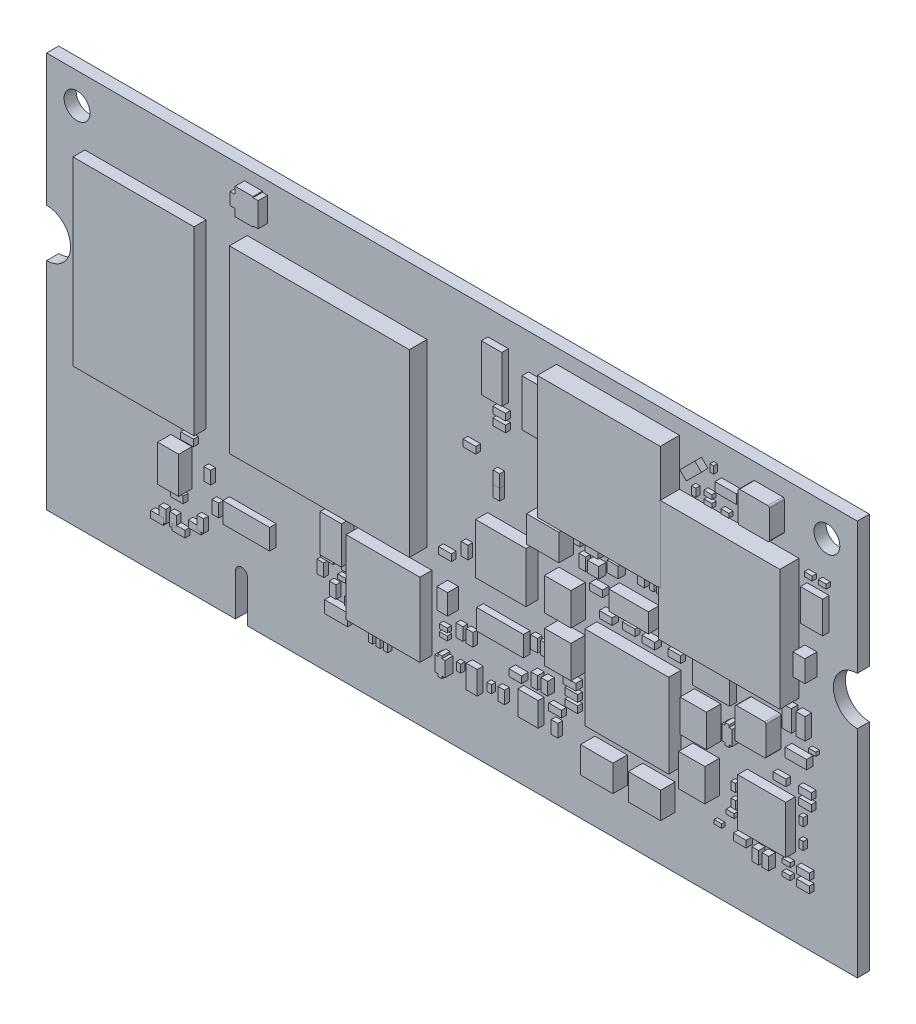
SolidWorks part; units mm, degrees
ref_plane "Front Plane" through (0, 0, 0) normal (0, 0, 1) x (1, 0, 0)
ref_plane "Top Plane" through (0, 0, 0) normal (0, 1, 0) x (1, 0, 0)
ref_plane "Right Plane" through (0, 0, 0) normal (1, 0, 0) x (0, 0, -1)
sketch "Sketch1" plane through (0, 0, 0) normal (0, 0, 1) x (1, 0, 0)
  line L0 (74.7994, 51.9948) -> (74.7994, 33.9938)
  line L1 (74.7994, 33.9938) -> (23.9486, 33.9938)
  line L2 (23.9486, 33.9938) -> (23.9486, 37.494)
  line L3 (22.9504, 37.494) -> (22.9504, 33.9938)
  line L4 (22.9504, 33.9938) -> (7.1999, 33.9938)
  line L5 (7.1999, 33.9938) -> (7.1999, 51.9948)
  line L6 (7.1999, 55.9928) -> (7.1994, 66.9879)
  line L7 (7.1994, 66.9879) -> (74.7994, 66.9879)
  line L8 (74.7994, 66.9879) -> (74.7994, 55.9928)
  arc A0 (74.7994, 55.9928) -> (72.8005, 53.9938) centre (74.7994, 53.9938) ccw
  arc A1 (72.8005, 53.9938) -> (74.7994, 51.9948) centre (74.7994, 53.9938) ccw
  arc A2 (23.9486, 37.494) -> (23.4508, 37.9943) centre (23.4495, 37.4952) ccw
  arc A3 (23.4508, 37.9943) -> (22.9504, 37.494) centre (23.4508, 37.494) ccw
  arc A4 (7.1999, 51.9948) -> (9.1989, 53.9938) centre (7.1999, 53.9938) ccw
  arc A5 (9.1989, 53.9938) -> (7.1999, 55.9928) centre (7.1999, 53.9938) ccw
extrude "BOARD" add sketch "Sketch1" along normal blind 1.0084 separate body
ref_plane "Plane1" through (0, 0, 1.0084) normal (0, 0, 1) x (1, 0, 0)
sketch "Sketch2" plane through (0, 0, 1.0084) normal (0, 0, 1) x (1, 0, 0)
  line L0 (40.2293, 40.3921) -> (40.2293, 39.1424)
  line L1 (40.2293, 39.1424) -> (40.4795, 39.1424)
  line L2 (40.4795, 39.1424) -> (40.4795, 38.9392)
  line L3 (40.4795, 38.9392) -> (40.83, 38.9392)
  line L4 (40.83, 38.9392) -> (40.83, 39.1424)
  line L5 (40.83, 39.1424) -> (41.0802, 39.1424)
  line L6 (41.0802, 39.1424) -> (41.0802, 40.3921)
  line L7 (41.0802, 40.3921) -> (40.83, 40.3921)
  line L8 (40.83, 40.3921) -> (40.83, 40.5953)
  line L9 (40.83, 40.5953) -> (40.4795, 40.5953)
  line L10 (40.4795, 40.5953) -> (40.4795, 40.3921)
  line L11 (40.4795, 40.3921) -> (40.2293, 40.3921)
extrude "SSMINI2-1" add sketch "Sketch2" along normal blind 0.6604 separate body
sketch "Sketch3" plane through (0, 0, 0) normal (0, 0, 1) x (1, 0, 0)
  line L0 (43.0766, 40.669) -> (43.0766, 39.4193)
  line L1 (43.0766, 39.4193) -> (42.8264, 39.4193)
  line L2 (42.8264, 39.4193) -> (42.8264, 39.2161)
  line L3 (42.8264, 39.2161) -> (42.4759, 39.2161)
  line L4 (42.4759, 39.2161) -> (42.4759, 39.4193)
  line L5 (42.4759, 39.4193) -> (42.2257, 39.4193)
  line L6 (42.2257, 39.4193) -> (42.2257, 40.669)
  line L7 (42.2257, 40.669) -> (42.4759, 40.669)
  line L8 (42.4759, 40.669) -> (42.4759, 40.8722)
  line L9 (42.4759, 40.8722) -> (42.8264, 40.8722)
  line L10 (42.8264, 40.8722) -> (42.8264, 40.669)
  line L11 (42.8264, 40.669) -> (43.0766, 40.669)
extrude "SSMINI2-2" add sketch "Sketch3" against normal blind 0.6604 separate body
sketch "Sketch4" plane through (0, 0, 1.0084) normal (0, 0, 1) x (1, 0, 0)
  line L0 (64.1789, 47.3949) -> (64.1789, 46.1452)
  line L1 (64.1789, 46.1452) -> (64.4291, 46.1452)
  line L2 (64.4291, 46.1452) -> (64.4291, 45.942)
  line L3 (64.4291, 45.942) -> (64.7797, 45.942)
  line L4 (64.7797, 45.942) -> (64.7797, 46.1452)
  line L5 (64.7797, 46.1452) -> (65.0298, 46.1452)
  line L6 (65.0298, 46.1452) -> (65.0298, 47.3949)
  line L7 (65.0298, 47.3949) -> (64.7797, 47.3949)
  line L8 (64.7797, 47.3949) -> (64.7797, 47.5981)
  line L9 (64.7797, 47.5981) -> (64.4291, 47.5981)
  line L10 (64.4291, 47.5981) -> (64.4291, 47.3949)
  line L11 (64.4291, 47.3949) -> (64.1789, 47.3949)
extrude "SSMINI2-3" add sketch "Sketch4" along normal blind 0.6604 separate body
sketch "Sketch5" plane through (0, 0, 0) normal (0, 0, 1) x (1, 0, 0)
  line L0 (13.5352, 62.4355) -> (14.7848, 62.4355)
  line L1 (14.7848, 62.4355) -> (14.7848, 62.1853)
  line L2 (14.7848, 62.1853) -> (14.988, 62.1853)
  line L3 (14.988, 62.1853) -> (14.988, 61.8348)
  line L4 (14.988, 61.8348) -> (14.7848, 61.8348)
  line L5 (14.7848, 61.8348) -> (14.7848, 61.5846)
  line L6 (14.7848, 61.5846) -> (13.5352, 61.5846)
  line L7 (13.5352, 61.5846) -> (13.5352, 61.8348)
  line L8 (13.5352, 61.8348) -> (13.332, 61.8348)
  line L9 (13.332, 61.8348) -> (13.332, 62.1853)
  line L10 (13.332, 62.1853) -> (13.5352, 62.1853)
  line L11 (13.5352, 62.1853) -> (13.5352, 62.4355)
extrude "SSMINI2-4" add sketch "Sketch5" against normal blind 0.6604 separate body
sketch "Sketch6" plane through (0, 0, 0) normal (0, 0, 1) x (1, 0, 0)
  line L0 (51.0471, 42.2336) -> (51.0471, 43.4833)
  line L1 (51.0471, 43.4833) -> (51.2973, 43.4833)
  line L2 (51.2973, 43.4833) -> (51.2973, 43.6865)
  line L3 (51.2973, 43.6865) -> (51.6479, 43.6865)
  line L4 (51.6479, 43.6865) -> (51.6479, 43.4833)
  line L5 (51.6479, 43.4833) -> (51.898, 43.4833)
  line L6 (51.898, 43.4833) -> (51.898, 42.2336)
  line L7 (51.898, 42.2336) -> (51.6479, 42.2336)
  line L8 (51.6479, 42.2336) -> (51.6479, 42.0304)
  line L9 (51.6479, 42.0304) -> (51.2973, 42.0304)
  line L10 (51.2973, 42.0304) -> (51.2973, 42.2336)
  line L11 (51.2973, 42.2336) -> (51.0471, 42.2336)
extrude "SSMINI2-5" add sketch "Sketch6" against normal blind 0.6604 separate body
sketch "Sketch7" plane through (0, 0, 0) normal (0, 0, 1) x (1, 0, 0)
  line L0 (65.2076, 47.3949) -> (65.2076, 46.1452)
  line L1 (65.2076, 46.1452) -> (64.9575, 46.1452)
  line L2 (64.9575, 46.1452) -> (64.9575, 45.942)
  line L3 (64.9575, 45.942) -> (64.6069, 45.942)
  line L4 (64.6069, 45.942) -> (64.6069, 46.1452)
  line L5 (64.6069, 46.1452) -> (64.3567, 46.1452)
  line L6 (64.3567, 46.1452) -> (64.3567, 47.3949)
  line L7 (64.3567, 47.3949) -> (64.6069, 47.3949)
  line L8 (64.6069, 47.3949) -> (64.6069, 47.5981)
  line L9 (64.6069, 47.5981) -> (64.9575, 47.5981)
  line L10 (64.9575, 47.5981) -> (64.9575, 47.3949)
  line L11 (64.9575, 47.3949) -> (65.2076, 47.3949)
extrude "SSMINI2-6" add sketch "Sketch7" against normal blind 0.6604 separate body
sketch "Sketch8" plane through (0, 0, 1.0084) normal (0, 0, 1) x (1, 0, 0)
  line L0 (60.0913, 48.8645) -> (60.0913, 41.8643)
  line L1 (60.0913, 41.8643) -> (53.0911, 41.8643)
  line L2 (53.0911, 41.8643) -> (53.0911, 48.8645)
  line L3 (53.0911, 48.8645) -> (60.0913, 48.8645)
extrude "HVQFN56_0P4_7X7_EP4P7MM-1" add sketch "Sketch8" along normal blind 1.0152 separate body
sketch "Sketch9" plane through (0, 0, 1.0084) normal (0, 0, 1) x (1, 0, 0)
  line L0 (17.5623, 44.6192) -> (19.3124, 44.6192)
  line L1 (19.3124, 44.6192) -> (19.3124, 41.5691)
  line L2 (19.3124, 41.5691) -> (17.5623, 41.5691)
  line L3 (17.5623, 41.5691) -> (17.5623, 44.6192)
extrude "SOT23-6-1" add sketch "Sketch9" along normal blind 1.1001 separate body
sketch "Sketch10" plane through (0, 0, 1.0084) normal (0, 0, 1) x (1, 0, 0)
  line L0 (23.9276, 62.1683) -> (38.9278, 62.1683)
  line L1 (38.9278, 62.1683) -> (38.9278, 47.1681)
  line L2 (38.9278, 47.1681) -> (23.9276, 47.1681)
  line L3 (23.9276, 47.1681) -> (23.9276, 62.1683)
extrude "BGA548_0P5_15X15MM-1" add sketch "Sketch10" along normal blind 1.4811 separate body
sketch "Sketch11" plane through (0, 0, 1.0084) normal (0, 0, 1) x (1, 0, 0)
  line L0 (69.9394, 51.7682) -> (59.8394, 51.7682)
  line L1 (59.8394, 51.7682) -> (59.8394, 61.8683)
  line L2 (59.8394, 61.8683) -> (69.9394, 61.8683)
  line L3 (69.9394, 61.8683) -> (69.9394, 51.7682)
extrude "450-01159R_V2-1" add sketch "Sketch11" along normal blind 1.6002 separate body
sketch "Sketch12" plane through (0, 0, 0) normal (0, 0, 1) x (1, 0, 0)
  line L0 (61.9732, 52.656) -> (61.9732, 65.756)
  line L1 (61.9732, 65.756) -> (50.3733, 65.756)
  line L2 (50.3733, 65.756) -> (50.3733, 52.656)
  line L3 (50.3733, 52.656) -> (61.9732, 52.656)
extrude "153_WFBGA_V2-1" add sketch "Sketch12" against normal blind 0.8001 separate body
sketch "Sketch13" plane through (0, 0, 0) normal (0, 0, 1) x (1, 0, 0)
  line L0 (67.3324, 60.1254) -> (67.3324, 57.2044)
  line L1 (67.3324, 57.2044) -> (68.6024, 57.2044)
  line L2 (68.6024, 57.2044) -> (68.6024, 60.1254)
  line L3 (68.6024, 60.1254) -> (67.3324, 60.1254)
extrude "SOT23-1" add sketch "Sketch13" against normal blind 1.1176 separate body
sketch "Sketch14" plane through (0, 0, 1.0084) normal (0, 0, 1) x (1, 0, 0)
  line L0 (64.7446, 50.9824) -> (64.7446, 48.8823)
  line L1 (64.7446, 48.8823) -> (61.6448, 48.8823)
  line L2 (61.6448, 48.8823) -> (61.6448, 50.9824)
  line L3 (61.6448, 50.9824) -> (64.7446, 50.9824)
extrude "VSON008X2030-1" add sketch "Sketch14" along normal blind 0.5999 separate body
sketch "Sketch15" plane through (0, 0, 1.0084) normal (0, 0, 1) x (1, 0, 0)
  line L0 (63.1185, 39.3964) -> (63.1185, 39.7266)
  line L1 (63.1185, 39.7266) -> (63.7484, 39.7266)
  line L2 (63.7484, 39.7266) -> (63.7484, 39.3964)
  line L3 (63.7484, 39.3964) -> (63.1185, 39.3964)
extrude "R0201-SHORTED-1" add sketch "Sketch15" along normal blind 0.254 separate body
sketch "Sketch16" plane through (0, 0, 0) normal (0, 0, 1) x (1, 0, 0)
  line L0 (56.5818, 50.9781) -> (56.5818, 51.9783)
  line L1 (56.5818, 51.9783) -> (54.782, 51.9783)
  line L2 (54.782, 51.9783) -> (54.782, 50.9781)
  line L3 (54.782, 50.9781) -> (56.5818, 50.9781)
extrude "C0603_V1-1" add sketch "Sketch16" against normal blind 1 separate body
sketch "Sketch17" plane through (0, 0, 1.0084) normal (0, 0, 1) x (1, 0, 0)
  line L0 (70.4289, 55.8571) -> (71.4291, 55.8571)
  line L1 (71.4291, 55.8571) -> (71.4291, 54.0573)
  line L2 (71.4291, 54.0573) -> (70.4289, 54.0573)
  line L3 (70.4289, 54.0573) -> (70.4289, 55.8571)
extrude "C0603_V1-2" add sketch "Sketch17" along normal blind 1 separate body
sketch "Sketch18" plane through (0, 0, 0) normal (0, 0, 1) x (1, 0, 0)
  line L0 (52.1759, 50.4132) -> (51.1757, 50.4132)
  line L1 (51.1757, 50.4132) -> (51.1757, 48.6133)
  line L2 (51.1757, 48.6133) -> (52.1759, 48.6133)
  line L3 (52.1759, 48.6133) -> (52.1759, 50.4132)
extrude "C0603_V1-3" add sketch "Sketch18" against normal blind 1 separate body
sketch "Sketch19" plane through (0, 0, 0) normal (0, 0, 1) x (1, 0, 0)
  line L0 (62.6057, 41.9077) -> (63.6059, 41.9077)
  line L1 (63.6059, 41.9077) -> (63.6059, 43.7076)
  line L2 (63.6059, 43.7076) -> (62.6057, 43.7076)
  line L3 (62.6057, 43.7076) -> (62.6057, 41.9077)
extrude "C0603_V1-4" add sketch "Sketch19" against normal blind 1 separate body
sketch "Sketch20" plane through (0, 0, 0) normal (0, 0, 1) x (1, 0, 0)
  line L0 (61.1833, 41.9077) -> (62.1835, 41.9077)
  line L1 (62.1835, 41.9077) -> (62.1835, 43.7076)
  line L2 (62.1835, 43.7076) -> (61.1833, 43.7076)
  line L3 (61.1833, 43.7076) -> (61.1833, 41.9077)
extrude "C0603_V1-5" add sketch "Sketch20" against normal blind 1 separate body
sketch "Sketch21" plane through (0, 0, 0) normal (0, 0, 1) x (1, 0, 0)
  line L0 (59.4469, 39.6319) -> (59.4469, 40.6321)
  line L1 (59.4469, 40.6321) -> (57.6471, 40.6321)
  line L2 (57.6471, 40.6321) -> (57.6471, 39.6319)
  line L3 (57.6471, 39.6319) -> (59.4469, 39.6319)
extrude "C0603_V1-6" add sketch "Sketch21" against normal blind 1 separate body
sketch "Sketch22" plane through (0, 0, 0) normal (0, 0, 1) x (1, 0, 0)
  line L0 (59.4469, 38.2095) -> (59.4469, 39.2097)
  line L1 (59.4469, 39.2097) -> (57.6471, 39.2097)
  line L2 (57.6471, 39.2097) -> (57.6471, 38.2095)
  line L3 (57.6471, 38.2095) -> (59.4469, 38.2095)
extrude "C0603_V1-7" add sketch "Sketch22" against normal blind 1 separate body
sketch "Sketch23" plane through (0, 0, 0) normal (0, 0, 1) x (1, 0, 0)
  line L0 (51.1757, 45.3367) -> (52.1759, 45.3367)
  line L1 (52.1759, 45.3367) -> (52.1759, 47.1366)
  line L2 (52.1759, 47.1366) -> (51.1757, 47.1366)
  line L3 (51.1757, 47.1366) -> (51.1757, 45.3367)
extrude "C0603_V1-8" add sketch "Sketch23" against normal blind 1 separate body
sketch "Sketch24" plane through (0, 0, 0) normal (0, 0, 1) x (1, 0, 0)
  line L0 (49.7533, 45.3367) -> (50.7535, 45.3367)
  line L1 (50.7535, 45.3367) -> (50.7535, 47.1366)
  line L2 (50.7535, 47.1366) -> (49.7533, 47.1366)
  line L3 (49.7533, 47.1366) -> (49.7533, 45.3367)
extrude "C0603_V1-9" add sketch "Sketch24" against normal blind 1 separate body
sketch "Sketch25" plane through (0, 0, 0) normal (0, 0, 1) x (1, 0, 0)
  line L0 (53.5196, 39.2224) -> (53.5196, 38.2222)
  line L1 (53.5196, 38.2222) -> (55.3194, 38.2222)
  line L2 (55.3194, 38.2222) -> (55.3194, 39.2224)
  line L3 (55.3194, 39.2224) -> (53.5196, 39.2224)
extrude "C0603_V1-10" add sketch "Sketch25" against normal blind 1 separate body
sketch "Sketch26" plane through (0, 0, 0) normal (0, 0, 1) x (1, 0, 0)
  line L0 (53.5196, 40.6448) -> (53.5196, 39.6446)
  line L1 (53.5196, 39.6446) -> (55.3194, 39.6446)
  line L2 (55.3194, 39.6446) -> (55.3194, 40.6448)
  line L3 (55.3194, 40.6448) -> (53.5196, 40.6448)
extrude "C0603_V1-11" add sketch "Sketch26" against normal blind 1 separate body
sketch "Sketch27" plane through (0, 0, 0) normal (0, 0, 1) x (1, 0, 0)
  line L0 (50.7535, 50.4132) -> (49.7533, 50.4132)
  line L1 (49.7533, 50.4132) -> (49.7533, 48.6133)
  line L2 (49.7533, 48.6133) -> (50.7535, 48.6133)
  line L3 (50.7535, 48.6133) -> (50.7535, 50.4132)
extrude "C0603_V1-12" add sketch "Sketch27" against normal blind 1 separate body
sketch "Sketch28" plane through (0, 0, 0) normal (0, 0, 1) x (1, 0, 0)
  line L0 (63.6313, 47.3652) -> (62.6311, 47.3652)
  line L1 (62.6311, 47.3652) -> (62.6311, 45.5653)
  line L2 (62.6311, 45.5653) -> (63.6313, 45.5653)
  line L3 (63.6313, 45.5653) -> (63.6313, 47.3652)
extrude "C0603_V1-13" add sketch "Sketch28" against normal blind 1 separate body
sketch "Sketch29" plane through (0, 0, 0) normal (0, 0, 1) x (1, 0, 0)
  line L0 (62.2089, 47.3652) -> (61.2087, 47.3652)
  line L1 (61.2087, 47.3652) -> (61.2087, 45.5653)
  line L2 (61.2087, 45.5653) -> (62.2089, 45.5653)
  line L3 (62.2089, 45.5653) -> (62.2089, 47.3652)
extrude "C0603_V1-14" add sketch "Sketch29" against normal blind 1 separate body
sketch "Sketch30" plane through (0, 0, 0) normal (0, 0, 1) x (1, 0, 0)
  line L0 (56.3603, 46.7779) -> (56.3603, 47.7782)
  line L1 (56.3603, 47.7782) -> (54.5605, 47.7782)
  line L2 (54.5605, 47.7782) -> (54.5605, 46.7779)
  line L3 (54.5605, 46.7779) -> (56.3603, 46.7779)
extrude "C0603_V1-15" add sketch "Sketch30" against normal blind 1 separate body
sketch "Sketch31" plane through (0, 0, 0) normal (0, 0, 1) x (1, 0, 0)
  line L0 (54.8871, 45.3301) -> (54.8871, 46.3304)
  line L1 (54.8871, 46.3304) -> (53.0873, 46.3304)
  line L2 (53.0873, 46.3304) -> (53.0873, 45.3301)
  line L3 (53.0873, 45.3301) -> (54.8871, 45.3301)
extrude "C0603_V1-16" add sketch "Sketch31" against normal blind 1 separate body
sketch "Sketch32" plane through (0, 0, 0) normal (0, 0, 1) x (1, 0, 0)
  line L0 (55.5795, 43.7838) -> (54.5793, 43.7838)
  line L1 (54.5793, 43.7838) -> (54.5793, 41.9839)
  line L2 (54.5793, 41.9839) -> (55.5795, 41.9839)
  line L3 (55.5795, 41.9839) -> (55.5795, 43.7838)
extrude "C0603_V1-17" add sketch "Sketch32" against normal blind 1 separate body
sketch "Sketch33" plane through (0, 0, 0) normal (0, 0, 1) x (1, 0, 0)
  line L0 (58.3705, 44.0952) -> (58.3705, 43.0949)
  line L1 (58.3705, 43.0949) -> (60.1703, 43.0949)
  line L2 (60.1703, 43.0949) -> (60.1703, 44.0952)
  line L3 (60.1703, 44.0952) -> (58.3705, 44.0952)
extrude "C0603_V1-18" add sketch "Sketch33" against normal blind 1 separate body
sketch "Sketch34" plane through (0, 0, 0) normal (0, 0, 1) x (1, 0, 0)
  line L0 (57.6115, 43.7838) -> (56.6113, 43.7838)
  line L1 (56.6113, 43.7838) -> (56.6113, 41.9839)
  line L2 (56.6113, 41.9839) -> (57.6115, 41.9839)
  line L3 (57.6115, 41.9839) -> (57.6115, 43.7838)
extrude "C0603_V1-19" add sketch "Sketch34" against normal blind 1 separate body
sketch "Sketch35" plane through (0, 0, 0) normal (0, 0, 1) x (1, 0, 0)
  line L0 (57.5069, 47.7528) -> (57.5069, 46.7525)
  line L1 (57.5069, 46.7525) -> (59.3067, 46.7525)
  line L2 (59.3067, 46.7525) -> (59.3067, 47.7528)
  line L3 (59.3067, 47.7528) -> (57.5069, 47.7528)
extrude "C0603_V1-20" add sketch "Sketch35" against normal blind 1 separate body
sketch "Sketch36" plane through (0, 0, 0) normal (0, 0, 1) x (1, 0, 0)
  line L0 (58.3705, 45.5176) -> (58.3705, 44.5173)
  line L1 (58.3705, 44.5173) -> (60.1703, 44.5173)
  line L2 (60.1703, 44.5173) -> (60.1703, 45.5176)
  line L3 (60.1703, 45.5176) -> (58.3705, 45.5176)
extrude "C0603_V1-21" add sketch "Sketch36" against normal blind 1 separate body
sketch "Sketch37" plane through (0, 0, 1.0084) normal (0, 0, 1) x (1, 0, 0)
  line L0 (32.4858, 41.8574) -> (32.4858, 41.4972)
  line L1 (32.4858, 41.4972) -> (31.8259, 41.4972)
  line L2 (31.8259, 41.4972) -> (31.8259, 41.8574)
  line L3 (31.8259, 41.8574) -> (32.4858, 41.8574)
extrude "C0201_V1-1" add sketch "Sketch37" along normal blind 0.35 separate body
sketch "Sketch38" plane through (0, 0, 0) normal (0, 0, 1) x (1, 0, 0)
  line L0 (35.7167, 45.353) -> (35.7167, 45.7131)
  line L1 (35.7167, 45.7131) -> (35.0568, 45.7131)
  line L2 (35.0568, 45.7131) -> (35.0568, 45.353)
  line L3 (35.0568, 45.353) -> (35.7167, 45.353)
extrude "C0201_V1-2" add sketch "Sketch38" against normal blind 0.35 separate body
sketch "Sketch39" plane through (0, 0, 1.0084) normal (0, 0, 1) x (1, 0, 0)
  line L0 (32.1536, 42.9725) -> (32.5138, 42.9725)
  line L1 (32.5138, 42.9725) -> (32.5138, 42.3126)
  line L2 (32.5138, 42.3126) -> (32.1536, 42.3126)
  line L3 (32.1536, 42.3126) -> (32.1536, 42.9725)
extrude "C0201_V1-3" add sketch "Sketch39" along normal blind 0.35 separate body
sketch "Sketch40" plane through (0, 0, 1.0084) normal (0, 0, 1) x (1, 0, 0)
  line L0 (62.3606, 62.1876) -> (62.3606, 62.5478)
  line L1 (62.3606, 62.5478) -> (63.0204, 62.5478)
  line L2 (63.0204, 62.5478) -> (63.0204, 62.1876)
  line L3 (63.0204, 62.1876) -> (62.3606, 62.1876)
extrude "C0201_V1-4" add sketch "Sketch40" along normal blind 0.35 separate body
sketch "Sketch41" plane through (0, 0, 1.0084) normal (0, 0, 1) x (1, 0, 0)
  line L0 (61.6857, 62.3151) -> (61.3255, 62.3151)
  line L1 (61.3255, 62.3151) -> (61.3255, 62.975)
  line L2 (61.3255, 62.975) -> (61.6857, 62.975)
  line L3 (61.6857, 62.975) -> (61.6857, 62.3151)
extrude "C0201_V1-5" add sketch "Sketch41" along normal blind 0.35 separate body
sketch "Sketch42" plane through (0, 0, 1.0084) normal (0, 0, 1) x (1, 0, 0)
  line L0 (64.4322, 62.5368) -> (64.4322, 62.1767)
  line L1 (64.4322, 62.1767) -> (63.7723, 62.1767)
  line L2 (63.7723, 62.1767) -> (63.7723, 62.5368)
  line L3 (63.7723, 62.5368) -> (64.4322, 62.5368)
extrude "C0201_V1-6" add sketch "Sketch42" along normal blind 0.35 separate body
sketch "Sketch43" plane through (0, 0, 1.0084) normal (0, 0, 1) x (1, 0, 0)
  line L0 (68.8845, 39.5033) -> (68.8845, 39.8635)
  line L1 (68.8845, 39.8635) -> (69.5444, 39.8635)
  line L2 (69.5444, 39.8635) -> (69.5444, 39.5033)
  line L3 (69.5444, 39.5033) -> (68.8845, 39.5033)
extrude "C0201_V1-7" add sketch "Sketch43" along normal blind 0.35 separate body
sketch "Sketch44" plane through (0, 0, 1.0084) normal (0, 0, 1) x (1, 0, 0)
  line L0 (64.9877, 41.4109) -> (64.6275, 41.4109)
  line L1 (64.6275, 41.4109) -> (64.6275, 42.0708)
  line L2 (64.6275, 42.0708) -> (64.9877, 42.0708)
  line L3 (64.9877, 42.0708) -> (64.9877, 41.4109)
extrude "C0201_V1-8" add sketch "Sketch44" along normal blind 0.35 separate body
sketch "Sketch45" plane through (0, 0, 1.0084) normal (0, 0, 1) x (1, 0, 0)
  line L0 (64.6148, 43.304) -> (64.975, 43.304)
  line L1 (64.975, 43.304) -> (64.975, 42.6441)
  line L2 (64.975, 42.6441) -> (64.6148, 42.6441)
  line L3 (64.6148, 42.6441) -> (64.6148, 43.304)
extrude "C0201_V1-9" add sketch "Sketch45" along normal blind 0.35 separate body
sketch "Sketch46" plane through (0, 0, 1.0084) normal (0, 0, 1) x (1, 0, 0)
  line L0 (58.6356, 55.1076) -> (58.6356, 54.7474)
  line L1 (58.6356, 54.7474) -> (57.9758, 54.7474)
  line L2 (57.9758, 54.7474) -> (57.9758, 55.1076)
  line L3 (57.9758, 55.1076) -> (58.6356, 55.1076)
extrude "C0201_V1-10" add sketch "Sketch46" along normal blind 0.35 separate body
sketch "Sketch47" plane through (0, 0, 1.0084) normal (0, 0, 1) x (1, 0, 0)
  line L0 (71.3852, 61.483) -> (71.3852, 61.1228)
  line L1 (71.3852, 61.1228) -> (70.7253, 61.1228)
  line L2 (70.7253, 61.1228) -> (70.7253, 61.483)
  line L3 (70.7253, 61.483) -> (71.3852, 61.483)
extrude "C0201_V1-11" add sketch "Sketch47" along normal blind 0.35 separate body
sketch "Sketch48" plane through (0, 0, 1.0084) normal (0, 0, 1) x (1, 0, 0)
  line L0 (68.8845, 38.5635) -> (68.8845, 38.9237)
  line L1 (68.8845, 38.9237) -> (69.5444, 38.9237)
  line L2 (69.5444, 38.9237) -> (69.5444, 38.5635)
  line L3 (69.5444, 38.5635) -> (68.8845, 38.5635)
extrude "C0201_V1-12" add sketch "Sketch48" along normal blind 0.35 separate body
sketch "Sketch49" plane through (0, 0, 0) normal (0, 0, 1) x (1, 0, 0)
  line L0 (34.9801, 39.0025) -> (34.6199, 39.0025)
  line L1 (34.6199, 39.0025) -> (34.6199, 38.3426)
  line L2 (34.6199, 38.3426) -> (34.9801, 38.3426)
  line L3 (34.9801, 38.3426) -> (34.9801, 39.0025)
extrude "C0201_V1-13" add sketch "Sketch49" against normal blind 0.35 separate body
sketch "Sketch50" plane through (0, 0, 0) normal (0, 0, 1) x (1, 0, 0)
  line L0 (33.9494, 45.7131) -> (33.9494, 45.353)
  line L1 (33.9494, 45.353) -> (34.6093, 45.353)
  line L2 (34.6093, 45.353) -> (34.6093, 45.7131)
  line L3 (34.6093, 45.7131) -> (33.9494, 45.7131)
extrude "C0201_V1-14" add sketch "Sketch50" against normal blind 0.35 separate body
sketch "Sketch51" plane through (0, 0, 0) normal (0, 0, 1) x (1, 0, 0)
  line L0 (43.9773, 47.5704) -> (44.3375, 47.5704)
  line L1 (44.3375, 47.5704) -> (44.3375, 48.2303)
  line L2 (44.3375, 48.2303) -> (43.9773, 48.2303)
  line L3 (43.9773, 48.2303) -> (43.9773, 47.5704)
extrude "C0201_V1-15" add sketch "Sketch51" against normal blind 0.35 separate body
sketch "Sketch52" plane through (0, 0, 0) normal (0, 0, 1) x (1, 0, 0)
  line L0 (46.5752, 52.3375) -> (46.215, 52.3375)
  line L1 (46.215, 52.3375) -> (46.215, 51.6776)
  line L2 (46.215, 51.6776) -> (46.5752, 51.6776)
  line L3 (46.5752, 51.6776) -> (46.5752, 52.3375)
extrude "C0201_V1-16" add sketch "Sketch52" against normal blind 0.35 separate body
sketch "Sketch53" plane through (0, 0, 1.0084) normal (0, 0, 1) x (1, 0, 0)
  line L0 (35.6359, 38.8963) -> (35.9961, 38.8963)
  line L1 (35.9961, 38.8963) -> (35.9961, 38.2364)
  line L2 (35.9961, 38.2364) -> (35.6359, 38.2364)
  line L3 (35.6359, 38.2364) -> (35.6359, 38.8963)
extrude "C0201_V1-17" add sketch "Sketch53" along normal blind 0.35 separate body
sketch "Sketch54" plane through (0, 0, 1.0084) normal (0, 0, 1) x (1, 0, 0)
  line L0 (72.5536, 61.483) -> (72.5536, 61.1228)
  line L1 (72.5536, 61.1228) -> (71.8937, 61.1228)
  line L2 (71.8937, 61.1228) -> (71.8937, 61.483)
  line L3 (71.8937, 61.483) -> (72.5536, 61.483)
extrude "C0201_V1-18" add sketch "Sketch54" along normal blind 0.35 separate body
sketch "Sketch55" plane through (0, 0, 1.0084) normal (0, 0, 1) x (1, 0, 0)
  line L0 (57.8203, 54.3938) -> (58.1805, 54.3938)
  line L1 (58.1805, 54.3938) -> (58.1805, 53.734)
  line L2 (58.1805, 53.734) -> (57.8203, 53.734)
  line L3 (57.8203, 53.734) -> (57.8203, 54.3938)
extrude "C0201_V1-19" add sketch "Sketch55" along normal blind 0.35 separate body
sketch "Sketch56" plane through (0, 0, 1.0084) normal (0, 0, 1) x (1, 0, 0)
  line L0 (58.389, 54.3938) -> (58.7492, 54.3938)
  line L1 (58.7492, 54.3938) -> (58.7492, 53.734)
  line L2 (58.7492, 53.734) -> (58.389, 53.734)
  line L3 (58.389, 53.734) -> (58.389, 54.3938)
extrude "C0201_V1-20" add sketch "Sketch56" along normal blind 0.35 separate body
sketch "Sketch57" plane through (0, 0, 1.0084) normal (0, 0, 1) x (1, 0, 0)
  line L0 (56.4639, 54.978) -> (56.8241, 54.978)
  line L1 (56.8241, 54.978) -> (56.8241, 54.3182)
  line L2 (56.8241, 54.3182) -> (56.4639, 54.3182)
  line L3 (56.4639, 54.3182) -> (56.4639, 54.978)
extrude "C0201_V1-21" add sketch "Sketch57" along normal blind 0.35 separate body
sketch "Sketch58" plane through (0, 0, 1.0084) normal (0, 0, 1) x (1, 0, 0)
  line L0 (55.867, 54.978) -> (56.2272, 54.978)
  line L1 (56.2272, 54.978) -> (56.2272, 54.3182)
  line L2 (56.2272, 54.3182) -> (55.867, 54.3182)
  line L3 (55.867, 54.3182) -> (55.867, 54.978)
extrude "C0201_V1-22" add sketch "Sketch58" along normal blind 0.35 separate body
sketch "Sketch59" plane through (0, 0, 1.0084) normal (0, 0, 1) x (1, 0, 0)
  line L0 (70.279, 41.9438) -> (70.6392, 41.9438)
  line L1 (70.6392, 41.9438) -> (70.6392, 41.2839)
  line L2 (70.6392, 41.2839) -> (70.279, 41.2839)
  line L3 (70.279, 41.2839) -> (70.279, 41.9438)
extrude "C0201_V1-23" add sketch "Sketch59" along normal blind 0.35 separate body
sketch "Sketch60" plane through (0, 0, 1.0084) normal (0, 0, 1) x (1, 0, 0)
  line L0 (70.279, 43.6583) -> (70.6392, 43.6583)
  line L1 (70.6392, 43.6583) -> (70.6392, 42.9984)
  line L2 (70.6392, 42.9984) -> (70.279, 42.9984)
  line L3 (70.279, 42.9984) -> (70.279, 43.6583)
extrude "C0201_V1-24" add sketch "Sketch60" along normal blind 0.35 separate body
sketch "Sketch61" plane through (0, 0, 1.0084) normal (0, 0, 1) x (1, 0, 0)
  line L0 (34.3814, 38.8968) -> (34.7416, 38.8968)
  line L1 (34.7416, 38.8968) -> (34.7416, 38.2369)
  line L2 (34.7416, 38.2369) -> (34.3814, 38.2369)
  line L3 (34.3814, 38.2369) -> (34.3814, 38.8968)
extrude "C0201_V1-25" add sketch "Sketch61" along normal blind 0.35 separate body
sketch "Sketch62" plane through (0, 0, 1.0084) normal (0, 0, 1) x (1, 0, 0)
  line L0 (40.2994, 42.1551) -> (40.2994, 42.5153)
  line L1 (40.2994, 42.5153) -> (40.9593, 42.5153)
  line L2 (40.9593, 42.5153) -> (40.9593, 42.1551)
  line L3 (40.9593, 42.1551) -> (40.2994, 42.1551)
extrude "C0201_V1-26" add sketch "Sketch62" along normal blind 0.35 separate body
sketch "Sketch63" plane through (0, 0, 1.0084) normal (0, 0, 1) x (1, 0, 0)
  line L0 (40.2994, 41.5785) -> (40.2994, 41.9387)
  line L1 (40.2994, 41.9387) -> (40.9593, 41.9387)
  line L2 (40.9593, 41.9387) -> (40.9593, 41.5785)
  line L3 (40.9593, 41.5785) -> (40.2994, 41.5785)
extrude "C0201_V1-27" add sketch "Sketch63" along normal blind 0.35 separate body
sketch "Sketch64" plane through (0, 0, 1.0084) normal (0, 0, 1) x (1, 0, 0)
  line L0 (62.3567, 62.8119) -> (62.3567, 63.1721)
  line L1 (62.3567, 63.1721) -> (63.0166, 63.1721)
  line L2 (63.0166, 63.1721) -> (63.0166, 62.8119)
  line L3 (63.0166, 62.8119) -> (62.3567, 62.8119)
extrude "C0201_V1-28" add sketch "Sketch64" along normal blind 0.35 separate body
sketch "Sketch65" plane through (0, 0, 1.0084) normal (0, 0, 1) x (1, 0, 0)
  line L0 (35.0068, 38.892) -> (35.367, 38.892)
  line L1 (35.367, 38.892) -> (35.367, 38.2321)
  line L2 (35.367, 38.2321) -> (35.0068, 38.2321)
  line L3 (35.0068, 38.2321) -> (35.0068, 38.892)
extrude "C0201_V1-29" add sketch "Sketch65" along normal blind 0.35 separate body
sketch "Sketch66" plane through (0, 0, 0) normal (0, 0, 1) x (1, 0, 0)
  line L0 (43.3601, 47.5704) -> (43.7203, 47.5704)
  line L1 (43.7203, 47.5704) -> (43.7203, 48.2303)
  line L2 (43.7203, 48.2303) -> (43.3601, 48.2303)
  line L3 (43.3601, 48.2303) -> (43.3601, 47.5704)
extrude "C0201_V1-30" add sketch "Sketch66" against normal blind 0.35 separate body
sketch "Sketch67" plane through (0, 0, 1.0084) normal (0, 0, 1) x (1, 0, 0)
  line L0 (64.8708, 41.07) -> (64.8708, 40.7098)
  line L1 (64.8708, 40.7098) -> (64.2109, 40.7098)
  line L2 (64.2109, 40.7098) -> (64.2109, 41.07)
  line L3 (64.2109, 41.07) -> (64.8708, 41.07)
extrude "C0201_V1-31" add sketch "Sketch67" along normal blind 0.35 separate body
sketch "Sketch68" plane through (0, 0, 1.0084) normal (0, 0, 1) x (1, 0, 0)
  line L0 (32.3822, 40.5341) -> (32.7424, 40.5341)
  line L1 (32.7424, 40.5341) -> (32.7424, 39.8742)
  line L2 (32.7424, 39.8742) -> (32.3822, 39.8742)
  line L3 (32.3822, 39.8742) -> (32.3822, 40.5341)
extrude "C0201_V1-32" add sketch "Sketch68" along normal blind 0.35 separate body
sketch "Sketch69" plane through (0, 0, 0) normal (0, 0, 1) x (1, 0, 0)
  line L0 (35.685, 59.1363) -> (36.0451, 59.1363)
  line L1 (36.0451, 59.1363) -> (36.0451, 59.7962)
  line L2 (36.0451, 59.7962) -> (35.685, 59.7962)
  line L3 (35.685, 59.7962) -> (35.685, 59.1363)
extrude "C0201_V1-33" add sketch "Sketch69" against normal blind 0.35 separate body
sketch "Sketch70" plane through (0, 0, 0) normal (0, 0, 1) x (1, 0, 0)
  line L0 (32.8224, 59.4944) -> (33.1826, 59.4944)
  line L1 (33.1826, 59.4944) -> (33.1826, 60.1543)
  line L2 (33.1826, 60.1543) -> (32.8224, 60.1543)
  line L3 (32.8224, 60.1543) -> (32.8224, 59.4944)
extrude "C0201_V1-34" add sketch "Sketch70" against normal blind 0.35 separate body
sketch "Sketch71" plane through (0, 0, 0) normal (0, 0, 1) x (1, 0, 0)
  line L0 (11.2047, 49.1051) -> (10.8445, 49.1051)
  line L1 (10.8445, 49.1051) -> (10.8445, 48.4452)
  line L2 (10.8445, 48.4452) -> (11.2047, 48.4452)
  line L3 (11.2047, 48.4452) -> (11.2047, 49.1051)
extrude "C0201_V1-35" add sketch "Sketch71" against normal blind 0.35 separate body
sketch "Sketch72" plane through (0, 0, 0) normal (0, 0, 1) x (1, 0, 0)
  line L0 (19.5491, 57.6781) -> (19.9093, 57.6781)
  line L1 (19.9093, 57.6781) -> (19.9093, 58.338)
  line L2 (19.9093, 58.338) -> (19.5491, 58.338)
  line L3 (19.5491, 58.338) -> (19.5491, 57.6781)
extrude "C0201_V1-36" add sketch "Sketch72" against normal blind 0.35 separate body
sketch "Sketch73" plane through (0, 0, 0) normal (0, 0, 1) x (1, 0, 0)
  line L0 (12.9893, 51.1056) -> (12.9893, 50.7454)
  line L1 (12.9893, 50.7454) -> (13.6492, 50.7454)
  line L2 (13.6492, 50.7454) -> (13.6492, 51.1056)
  line L3 (13.6492, 51.1056) -> (12.9893, 51.1056)
extrude "C0201_V1-37" add sketch "Sketch73" against normal blind 0.35 separate body
sketch "Sketch74" plane through (0, 0, 0) normal (0, 0, 1) x (1, 0, 0)
  line L0 (17.3134, 50.1896) -> (16.9532, 50.1896)
  line L1 (16.9532, 50.1896) -> (16.9532, 49.5297)
  line L2 (16.9532, 49.5297) -> (17.3134, 49.5297)
  line L3 (17.3134, 49.5297) -> (17.3134, 50.1896)
extrude "C0201_V1-38" add sketch "Sketch74" against normal blind 0.35 separate body
sketch "Sketch75" plane through (0, 0, 0) normal (0, 0, 1) x (1, 0, 0)
  line L0 (21.0828, 53.0586) -> (20.7226, 53.0586)
  line L1 (20.7226, 53.0586) -> (20.7226, 52.3987)
  line L2 (20.7226, 52.3987) -> (21.0828, 52.3987)
  line L3 (21.0828, 52.3987) -> (21.0828, 53.0586)
extrude "C0201_V1-39" add sketch "Sketch75" against normal blind 0.35 separate body
sketch "Sketch76" plane through (0, 0, 0) normal (0, 0, 1) x (1, 0, 0)
  line L0 (19.2905, 57.2752) -> (18.9304, 57.2752)
  line L1 (18.9304, 57.2752) -> (18.9304, 56.6153)
  line L2 (18.9304, 56.6153) -> (19.2905, 56.6153)
  line L3 (19.2905, 56.6153) -> (19.2905, 57.2752)
extrude "C0201_V1-40" add sketch "Sketch76" against normal blind 0.35 separate body
sketch "Sketch77" plane through (0, 0, 0) normal (0, 0, 1) x (1, 0, 0)
  line L0 (17.8498, 48.1094) -> (17.8498, 47.7492)
  line L1 (17.8498, 47.7492) -> (18.5097, 47.7492)
  line L2 (18.5097, 47.7492) -> (18.5097, 48.1094)
  line L3 (18.5097, 48.1094) -> (17.8498, 48.1094)
extrude "C0201_V1-41" add sketch "Sketch77" against normal blind 0.35 separate body
sketch "Sketch78" plane through (0, 0, 0) normal (0, 0, 1) x (1, 0, 0)
  line L0 (13.3495, 47.0543) -> (12.9893, 47.0543)
  line L1 (12.9893, 47.0543) -> (12.9893, 46.3944)
  line L2 (12.9893, 46.3944) -> (13.3495, 46.3944)
  line L3 (13.3495, 46.3944) -> (13.3495, 47.0543)
extrude "C0201_V1-42" add sketch "Sketch78" against normal blind 0.35 separate body
sketch "Sketch79" plane through (0, 0, 0) normal (0, 0, 1) x (1, 0, 0)
  line L0 (13.2499, 54.0428) -> (13.2499, 53.6826)
  line L1 (13.2499, 53.6826) -> (13.9098, 53.6826)
  line L2 (13.9098, 53.6826) -> (13.9098, 54.0428)
  line L3 (13.9098, 54.0428) -> (13.2499, 54.0428)
extrude "C0201_V1-43" add sketch "Sketch79" against normal blind 0.35 separate body
sketch "Sketch80" plane through (0, 0, 0) normal (0, 0, 1) x (1, 0, 0)
  line L0 (15.4877, 60.185) -> (15.8478, 60.185)
  line L1 (15.8478, 60.185) -> (15.8478, 60.8449)
  line L2 (15.8478, 60.8449) -> (15.4877, 60.8449)
  line L3 (15.4877, 60.8449) -> (15.4877, 60.185)
extrude "C0201_V1-44" add sketch "Sketch80" against normal blind 0.35 separate body
sketch "Sketch81" plane through (0, 0, 0) normal (0, 0, 1) x (1, 0, 0)
  line L0 (12.4559, 60.2069) -> (12.8161, 60.2069)
  line L1 (12.8161, 60.2069) -> (12.8161, 60.8668)
  line L2 (12.8161, 60.8668) -> (12.4559, 60.8668)
  line L3 (12.4559, 60.8668) -> (12.4559, 60.2069)
extrude "C0201_V1-45" add sketch "Sketch81" against normal blind 0.35 separate body
sketch "Sketch82" plane through (0, 0, 0) normal (0, 0, 1) x (1, 0, 0)
  line L0 (12.0307, 57.612) -> (12.3909, 57.612)
  line L1 (12.3909, 57.612) -> (12.3909, 58.2719)
  line L2 (12.3909, 58.2719) -> (12.0307, 58.2719)
  line L3 (12.0307, 58.2719) -> (12.0307, 57.612)
extrude "C0201_V1-46" add sketch "Sketch82" against normal blind 0.35 separate body
sketch "Sketch83" plane through (0, 0, 0) normal (0, 0, 1) x (1, 0, 0)
  line L0 (19.7294, 49.1716) -> (20.0896, 49.1716)
  line L1 (20.0896, 49.1716) -> (20.0896, 49.8315)
  line L2 (20.0896, 49.8315) -> (19.7294, 49.8315)
  line L3 (19.7294, 49.8315) -> (19.7294, 49.1716)
extrude "C0201_V1-47" add sketch "Sketch83" against normal blind 0.35 separate body
sketch "Sketch84" plane through (0, 0, 0) normal (0, 0, 1) x (1, 0, 0)
  line L0 (20.7226, 54.9298) -> (21.0828, 54.9298)
  line L1 (21.0828, 54.9298) -> (21.0828, 55.5897)
  line L2 (21.0828, 55.5897) -> (20.7226, 55.5897)
  line L3 (20.7226, 55.5897) -> (20.7226, 54.9298)
extrude "C0201_V1-48" add sketch "Sketch84" against normal blind 0.35 separate body
sketch "Sketch85" plane through (0, 0, 0) normal (0, 0, 1) x (1, 0, 0)
  line L0 (19.3022, 50.1998) -> (18.9421, 50.1998)
  line L1 (18.9421, 50.1998) -> (18.9421, 49.5399)
  line L2 (18.9421, 49.5399) -> (19.3022, 49.5399)
  line L3 (19.3022, 49.5399) -> (19.3022, 50.1998)
extrude "C0201_V1-49" add sketch "Sketch85" against normal blind 0.35 separate body
sketch "Sketch86" plane through (0, 0, 0) normal (0, 0, 1) x (1, 0, 0)
  line L0 (18.9913, 50.8165) -> (19.3515, 50.8165)
  line L1 (19.3515, 50.8165) -> (19.3515, 51.4764)
  line L2 (19.3515, 51.4764) -> (18.9913, 51.4764)
  line L3 (18.9913, 51.4764) -> (18.9913, 50.8165)
extrude "C0201_V1-50" add sketch "Sketch86" against normal blind 0.35 separate body
sketch "Sketch87" plane through (0, 0, 0) normal (0, 0, 1) x (1, 0, 0)
  line L0 (12.0556, 54.0492) -> (12.0556, 53.689)
  line L1 (12.0556, 53.689) -> (12.7155, 53.689)
  line L2 (12.7155, 53.689) -> (12.7155, 54.0492)
  line L3 (12.7155, 54.0492) -> (12.0556, 54.0492)
extrude "C0201_V1-51" add sketch "Sketch87" against normal blind 0.35 separate body
sketch "Sketch88" plane through (0, 0, 1.0084) normal (0, 0, 1) x (1, 0, 0)
  line L0 (44.2669, 40.2598) -> (44.627, 40.2598)
  line L1 (44.627, 40.2598) -> (44.627, 39.5999)
  line L2 (44.627, 39.5999) -> (44.2669, 39.5999)
  line L3 (44.2669, 39.5999) -> (44.2669, 40.2598)
extrude "C0201_V1-52" add sketch "Sketch88" along normal blind 0.35 separate body
sketch "Sketch89" plane through (0, 0, 1.0084) normal (0, 0, 1) x (1, 0, 0)
  line L0 (42.0769, 39.8107) -> (41.7167, 39.8107)
  line L1 (41.7167, 39.8107) -> (41.7167, 40.4706)
  line L2 (41.7167, 40.4706) -> (42.0769, 40.4706)
  line L3 (42.0769, 40.4706) -> (42.0769, 39.8107)
extrude "C0201_V1-53" add sketch "Sketch89" along normal blind 0.35 separate body
sketch "Sketch90" plane through (0, 0, 1.0084) normal (0, 0, 1) x (1, 0, 0)
  line L0 (53.0352, 51.3669) -> (53.0352, 51.9267)
  line L1 (53.0352, 51.9267) -> (54.0954, 51.9267)
  line L2 (54.0954, 51.9267) -> (54.0954, 51.3669)
  line L3 (54.0954, 51.3669) -> (53.0352, 51.3669)
extrude "C0402_V1-1" add sketch "Sketch90" along normal blind 0.5499 separate body
sketch "Sketch91" plane through (0, 0, 0) normal (0, 0, 1) x (1, 0, 0)
  line L0 (41.3779, 40.5414) -> (41.3779, 41.1013)
  line L1 (41.3779, 41.1013) -> (40.3177, 41.1013)
  line L2 (40.3177, 41.1013) -> (40.3177, 40.5414)
  line L3 (40.3177, 40.5414) -> (41.3779, 40.5414)
extrude "C0402_V1-2" add sketch "Sketch91" against normal blind 0.5499 separate body
sketch "Sketch92" plane through (0, 0, 0) normal (0, 0, 1) x (1, 0, 0)
  line L0 (32.9047, 43.0014) -> (33.4645, 43.0014)
  line L1 (33.4645, 43.0014) -> (33.4645, 44.0616)
  line L2 (33.4645, 44.0616) -> (32.9047, 44.0616)
  line L3 (32.9047, 44.0616) -> (32.9047, 43.0014)
extrude "C0402_V1-3" add sketch "Sketch92" against normal blind 0.5499 separate body
sketch "Sketch93" plane through (0, 0, 0) normal (0, 0, 1) x (1, 0, 0)
  line L0 (57.5173, 49.0593) -> (58.0771, 49.0593)
  line L1 (58.0771, 49.0593) -> (58.0771, 50.1195)
  line L2 (58.0771, 50.1195) -> (57.5173, 50.1195)
  line L3 (57.5173, 50.1195) -> (57.5173, 49.0593)
extrude "C0402_V1-4" add sketch "Sketch93" against normal blind 0.5499 separate body
sketch "Sketch94" plane through (0, 0, 0) normal (0, 0, 1) x (1, 0, 0)
  line L0 (58.2793, 49.0593) -> (58.8391, 49.0593)
  line L1 (58.8391, 49.0593) -> (58.8391, 50.1195)
  line L2 (58.8391, 50.1195) -> (58.2793, 50.1195)
  line L3 (58.2793, 50.1195) -> (58.2793, 49.0593)
extrude "C0402_V1-5" add sketch "Sketch94" against normal blind 0.5499 separate body
sketch "Sketch95" plane through (0, 0, 0) normal (0, 0, 1) x (1, 0, 0)
  line L0 (54.3969, 44.9671) -> (54.3969, 44.4073)
  line L1 (54.3969, 44.4073) -> (55.4571, 44.4073)
  line L2 (55.4571, 44.4073) -> (55.4571, 44.9671)
  line L3 (55.4571, 44.9671) -> (54.3969, 44.9671)
extrude "C0402_V1-6" add sketch "Sketch95" against normal blind 0.5499 separate body
sketch "Sketch96" plane through (0, 0, 0) normal (0, 0, 1) x (1, 0, 0)
  line L0 (58.7083, 45.8551) -> (58.7083, 46.4149)
  line L1 (58.7083, 46.4149) -> (57.6481, 46.4149)
  line L2 (57.6481, 46.4149) -> (57.6481, 45.8551)
  line L3 (57.6481, 45.8551) -> (58.7083, 45.8551)
extrude "C0402_V1-7" add sketch "Sketch96" against normal blind 0.5499 separate body
sketch "Sketch97" plane through (0, 0, 0) normal (0, 0, 1) x (1, 0, 0)
  line L0 (56.7553, 49.0593) -> (57.3151, 49.0593)
  line L1 (57.3151, 49.0593) -> (57.3151, 50.1195)
  line L2 (57.3151, 50.1195) -> (56.7553, 50.1195)
  line L3 (56.7553, 50.1195) -> (56.7553, 49.0593)
extrude "C0402_V1-8" add sketch "Sketch97" against normal blind 0.5499 separate body
sketch "Sketch98" plane through (0, 0, 0) normal (0, 0, 1) x (1, 0, 0)
  line L0 (60.5409, 47.3509) -> (59.9811, 47.3509)
  line L1 (59.9811, 47.3509) -> (59.9811, 46.2907)
  line L2 (59.9811, 46.2907) -> (60.5409, 46.2907)
  line L3 (60.5409, 46.2907) -> (60.5409, 47.3509)
extrude "C0402_V1-9" add sketch "Sketch98" against normal blind 0.5499 separate body
sketch "Sketch99" plane through (0, 0, 1.0084) normal (0, 0, 1) x (1, 0, 0)
  line L0 (53.7172, 54.5216) -> (53.7172, 53.9618)
  line L1 (53.7172, 53.9618) -> (52.657, 53.9618)
  line L2 (52.657, 53.9618) -> (52.657, 54.5216)
  line L3 (52.657, 54.5216) -> (53.7172, 54.5216)
extrude "C0402_V1-10" add sketch "Sketch99" along normal blind 0.5499 separate body
sketch "Sketch100" plane through (0, 0, 0) normal (0, 0, 1) x (1, 0, 0)
  line L0 (60.0827, 48.2211) -> (60.6425, 48.2211)
  line L1 (60.6425, 48.2211) -> (60.6425, 49.2813)
  line L2 (60.6425, 49.2813) -> (60.0827, 49.2813)
  line L3 (60.0827, 49.2813) -> (60.0827, 48.2211)
extrude "C0402_V1-11" add sketch "Sketch100" against normal blind 0.5499 separate body
sketch "Sketch101" plane through (0, 0, 0) normal (0, 0, 1) x (1, 0, 0)
  line L0 (59.3207, 49.0593) -> (59.8805, 49.0593)
  line L1 (59.8805, 49.0593) -> (59.8805, 50.1195)
  line L2 (59.8805, 50.1195) -> (59.3207, 50.1195)
  line L3 (59.3207, 50.1195) -> (59.3207, 49.0593)
extrude "C0402_V1-12" add sketch "Sketch101" against normal blind 0.5499 separate body
sketch "Sketch102" plane through (0, 0, 1.0084) normal (0, 0, 1) x (1, 0, 0)
  line L0 (58.9727, 54.878) -> (59.5325, 54.878)
  line L1 (59.5325, 54.878) -> (59.5325, 53.8178)
  line L2 (59.5325, 53.8178) -> (58.9727, 53.8178)
  line L3 (58.9727, 53.8178) -> (58.9727, 54.878)
extrude "C0402_V1-13" add sketch "Sketch102" along normal blind 0.5499 separate body
sketch "Sketch103" plane through (0, 0, 1.0084) normal (0, 0, 1) x (1, 0, 0)
  line L0 (67.3979, 39.6293) -> (67.9577, 39.6293)
  line L1 (67.9577, 39.6293) -> (67.9577, 38.5691)
  line L2 (67.9577, 38.5691) -> (67.3979, 38.5691)
  line L3 (67.3979, 38.5691) -> (67.3979, 39.6293)
extrude "C0402_V1-14" add sketch "Sketch103" along normal blind 0.5499 separate body
sketch "Sketch104" plane through (0, 0, 1.0084) normal (0, 0, 1) x (1, 0, 0)
  line L0 (66.5597, 39.6293) -> (67.1195, 39.6293)
  line L1 (67.1195, 39.6293) -> (67.1195, 38.5691)
  line L2 (67.1195, 38.5691) -> (66.5597, 38.5691)
  line L3 (66.5597, 38.5691) -> (66.5597, 39.6293)
extrude "C0402_V1-15" add sketch "Sketch104" along normal blind 0.5499 separate body
sketch "Sketch105" plane through (0, 0, 1.0084) normal (0, 0, 1) x (1, 0, 0)
  line L0 (65.0141, 39.2892) -> (65.0141, 39.849)
  line L1 (65.0141, 39.849) -> (66.0743, 39.849)
  line L2 (66.0743, 39.849) -> (66.0743, 39.2892)
  line L3 (66.0743, 39.2892) -> (65.0141, 39.2892)
extrude "C0402_V1-16" add sketch "Sketch105" along normal blind 0.5499 separate body
sketch "Sketch106" plane through (0, 0, 1.0084) normal (0, 0, 1) x (1, 0, 0)
  line L0 (51.6778, 55.1612) -> (52.2376, 55.1612)
  line L1 (52.2376, 55.1612) -> (52.2376, 54.101)
  line L2 (52.2376, 54.101) -> (51.6778, 54.101)
  line L3 (51.6778, 54.101) -> (51.6778, 55.1612)
extrude "C0402_V1-17" add sketch "Sketch106" along normal blind 0.5499 separate body
sketch "Sketch107" plane through (0, 0, 0) normal (0, 0, 1) x (1, 0, 0)
  line L0 (32.6276, 47.5772) -> (32.6276, 48.1371)
  line L1 (32.6276, 48.1371) -> (31.5674, 48.1371)
  line L2 (31.5674, 48.1371) -> (31.5674, 47.5772)
  line L3 (31.5674, 47.5772) -> (32.6276, 47.5772)
extrude "C0402_V1-18" add sketch "Sketch107" against normal blind 0.5499 separate body
sketch "Sketch108" plane through (0, 0, 1.0084) normal (0, 0, 1) x (1, 0, 0)
  line L0 (31.6573, 43.1002) -> (31.6573, 42.5404)
  line L1 (31.6573, 42.5404) -> (30.5971, 42.5404)
  line L2 (30.5971, 42.5404) -> (30.5971, 43.1002)
  line L3 (30.5971, 43.1002) -> (31.6573, 43.1002)
extrude "C0402_V1-19" add sketch "Sketch108" along normal blind 0.5499 separate body
sketch "Sketch109" plane through (0, 0, 1.0084) normal (0, 0, 1) x (1, 0, 0)
  line L0 (50.8155, 43.5183) -> (50.8155, 44.0781)
  line L1 (50.8155, 44.0781) -> (51.8757, 44.0781)
  line L2 (51.8757, 44.0781) -> (51.8757, 43.5183)
  line L3 (51.8757, 43.5183) -> (50.8155, 43.5183)
extrude "C0402_V1-20" add sketch "Sketch109" along normal blind 0.5499 separate body
sketch "Sketch110" plane through (0, 0, 1.0084) normal (0, 0, 1) x (1, 0, 0)
  line L0 (57.0347, 54.8886) -> (57.5945, 54.8886)
  line L1 (57.5945, 54.8886) -> (57.5945, 53.8284)
  line L2 (57.5945, 53.8284) -> (57.0347, 53.8284)
  line L3 (57.0347, 53.8284) -> (57.0347, 54.8886)
extrude "C0402_V1-21" add sketch "Sketch110" along normal blind 0.5499 separate body
sketch "Sketch111" plane through (0, 0, 0) normal (0, 0, 1) x (1, 0, 0)
  line L0 (70.0776, 40.8805) -> (70.6374, 40.8805)
  line L1 (70.6374, 40.8805) -> (70.6374, 41.9407)
  line L2 (70.6374, 41.9407) -> (70.0776, 41.9407)
  line L3 (70.0776, 41.9407) -> (70.0776, 40.8805)
extrude "C0402_V1-22" add sketch "Sketch111" against normal blind 0.5499 separate body
sketch "Sketch112" plane through (0, 0, 0) normal (0, 0, 1) x (1, 0, 0)
  line L0 (40.2666, 39.9748) -> (39.7068, 39.9748)
  line L1 (39.7068, 39.9748) -> (39.7068, 38.9146)
  line L2 (39.7068, 38.9146) -> (40.2666, 38.9146)
  line L3 (40.2666, 38.9146) -> (40.2666, 39.9748)
extrude "C0402_V1-23" add sketch "Sketch112" against normal blind 0.5499 separate body
sketch "Sketch113" plane through (0, 0, 0) normal (0, 0, 1) x (1, 0, 0)
  line L0 (38.5051, 39.4645) -> (38.5051, 40.0243)
  line L1 (38.5051, 40.0243) -> (37.4449, 40.0243)
  line L2 (37.4449, 40.0243) -> (37.4449, 39.4645)
  line L3 (37.4449, 39.4645) -> (38.5051, 39.4645)
extrude "C0402_V1-24" add sketch "Sketch113" against normal blind 0.5499 separate body
sketch "Sketch114" plane through (0, 0, 1.0084) normal (0, 0, 1) x (1, 0, 0)
  line L0 (57.3941, 49.7667) -> (57.3941, 50.3265)
  line L1 (57.3941, 50.3265) -> (58.4543, 50.3265)
  line L2 (58.4543, 50.3265) -> (58.4543, 49.7667)
  line L3 (58.4543, 49.7667) -> (57.3941, 49.7667)
extrude "C0402_V1-25" add sketch "Sketch114" along normal blind 0.5499 separate body
sketch "Sketch115" plane through (0, 0, 1.0084) normal (0, 0, 1) x (1, 0, 0)
  line L0 (54.8983, 50.3265) -> (54.8983, 49.7667)
  line L1 (54.8983, 49.7667) -> (53.8381, 49.7667)
  line L2 (53.8381, 49.7667) -> (53.8381, 50.3265)
  line L3 (53.8381, 50.3265) -> (54.8983, 50.3265)
extrude "C0402_V1-26" add sketch "Sketch115" along normal blind 0.5499 separate body
sketch "Sketch116" plane through (0, 0, 1.0084) normal (0, 0, 1) x (1, 0, 0)
  line L0 (53.7172, 55.2836) -> (53.7172, 54.7238)
  line L1 (53.7172, 54.7238) -> (52.657, 54.7238)
  line L2 (52.657, 54.7238) -> (52.657, 55.2836)
  line L3 (52.657, 55.2836) -> (53.7172, 55.2836)
extrude "C0402_V1-27" add sketch "Sketch116" along normal blind 0.5499 separate body
sketch "Sketch117" plane through (0, 0, 1.0084) normal (0, 0, 1) x (1, 0, 0)
  line L0 (55.4444, 55.2836) -> (55.4444, 54.7238)
  line L1 (55.4444, 54.7238) -> (54.3842, 54.7238)
  line L2 (54.3842, 54.7238) -> (54.3842, 55.2836)
  line L3 (54.3842, 55.2836) -> (55.4444, 55.2836)
extrude "C0402_V1-28" add sketch "Sketch117" along normal blind 0.5499 separate body
sketch "Sketch118" plane through (0, 0, 0) normal (0, 0, 1) x (1, 0, 0)
  line L0 (33.4645, 42.2963) -> (32.9047, 42.2963)
  line L1 (32.9047, 42.2963) -> (32.9047, 41.2361)
  line L2 (32.9047, 41.2361) -> (33.4645, 41.2361)
  line L3 (33.4645, 41.2361) -> (33.4645, 42.2963)
extrude "C0402_V1-29" add sketch "Sketch118" against normal blind 0.5499 separate body
sketch "Sketch119" plane through (0, 0, 1.0084) normal (0, 0, 1) x (1, 0, 0)
  line L0 (46.2943, 41.7911) -> (46.2943, 42.3509)
  line L1 (46.2943, 42.3509) -> (47.3545, 42.3509)
  line L2 (47.3545, 42.3509) -> (47.3545, 41.7911)
  line L3 (47.3545, 41.7911) -> (46.2943, 41.7911)
extrude "C0402_V1-30" add sketch "Sketch119" along normal blind 0.5499 separate body
sketch "Sketch120" plane through (0, 0, 1.0084) normal (0, 0, 1) x (1, 0, 0)
  line L0 (48.6918, 41.9854) -> (48.132, 41.9854)
  line L1 (48.132, 41.9854) -> (48.132, 43.0456)
  line L2 (48.132, 43.0456) -> (48.6918, 43.0456)
  line L3 (48.6918, 43.0456) -> (48.6918, 41.9854)
extrude "C0402_V1-31" add sketch "Sketch120" along normal blind 0.5499 separate body
sketch "Sketch121" plane through (0, 0, 0) normal (0, 0, 1) x (1, 0, 0)
  line L0 (46.2943, 42.3509) -> (46.2943, 41.7911)
  line L1 (46.2943, 41.7911) -> (47.3545, 41.7911)
  line L2 (47.3545, 41.7911) -> (47.3545, 42.3509)
  line L3 (47.3545, 42.3509) -> (46.2943, 42.3509)
extrude "C0402_V1-32" add sketch "Sketch121" against normal blind 0.5499 separate body
sketch "Sketch122" plane through (0, 0, 1.0084) normal (0, 0, 1) x (1, 0, 0)
  line L0 (49.5351, 41.9905) -> (48.9753, 41.9905)
  line L1 (48.9753, 41.9905) -> (48.9753, 43.0507)
  line L2 (48.9753, 43.0507) -> (49.5351, 43.0507)
  line L3 (49.5351, 43.0507) -> (49.5351, 41.9905)
extrude "C0402_V1-33" add sketch "Sketch122" along normal blind 0.5499 separate body
sketch "Sketch123" plane through (0, 0, 0) normal (0, 0, 1) x (1, 0, 0)
  line L0 (29.9352, 57.8719) -> (29.9352, 58.4317)
  line L1 (29.9352, 58.4317) -> (28.875, 58.4317)
  line L2 (28.875, 58.4317) -> (28.875, 57.8719)
  line L3 (28.875, 57.8719) -> (29.9352, 57.8719)
extrude "C0402_V1-34" add sketch "Sketch123" against normal blind 0.5499 separate body
sketch "Sketch124" plane through (0, 0, 0) normal (0, 0, 1) x (1, 0, 0)
  line L0 (32.5062, 53.9217) -> (32.5062, 53.3618)
  line L1 (32.5062, 53.3618) -> (33.5664, 53.3618)
  line L2 (33.5664, 53.3618) -> (33.5664, 53.9217)
  line L3 (33.5664, 53.9217) -> (32.5062, 53.9217)
extrude "C0402_V1-35" add sketch "Sketch124" against normal blind 0.5499 separate body
sketch "Sketch125" plane through (0, 0, 0) normal (0, 0, 1) x (1, 0, 0)
  line L0 (30.493, 53.3999) -> (30.493, 53.9598)
  line L1 (30.493, 53.9598) -> (29.4328, 53.9598)
  line L2 (29.4328, 53.9598) -> (29.4328, 53.3999)
  line L3 (29.4328, 53.3999) -> (30.493, 53.3999)
extrude "C0402_V1-36" add sketch "Sketch125" against normal blind 0.5499 separate body
sketch "Sketch126" plane through (0, 0, 0) normal (0, 0, 1) x (1, 0, 0)
  line L0 (37.8729, 54.2638) -> (38.4327, 54.2638)
  line L1 (38.4327, 54.2638) -> (38.4327, 55.324)
  line L2 (38.4327, 55.324) -> (37.8729, 55.324)
  line L3 (37.8729, 55.324) -> (37.8729, 54.2638)
extrude "C0402_V1-37" add sketch "Sketch126" against normal blind 0.5499 separate body
sketch "Sketch127" plane through (0, 0, 0) normal (0, 0, 1) x (1, 0, 0)
  line L0 (30.3837, 55.404) -> (30.3837, 55.9638)
  line L1 (30.3837, 55.9638) -> (29.3235, 55.9638)
  line L2 (29.3235, 55.9638) -> (29.3235, 55.404)
  line L3 (29.3235, 55.404) -> (30.3837, 55.404)
extrude "C0402_V1-38" add sketch "Sketch127" against normal blind 0.5499 separate body
sketch "Sketch128" plane through (0, 0, 0) normal (0, 0, 1) x (1, 0, 0)
  line L0 (34.656, 54.4058) -> (34.656, 54.9656)
  line L1 (34.656, 54.9656) -> (33.5958, 54.9656)
  line L2 (33.5958, 54.9656) -> (33.5958, 54.4058)
  line L3 (33.5958, 54.4058) -> (34.656, 54.4058)
extrude "C0402_V1-39" add sketch "Sketch128" against normal blind 0.5499 separate body
sketch "Sketch129" plane through (0, 0, 0) normal (0, 0, 1) x (1, 0, 0)
  line L0 (33.9209, 52.2752) -> (33.3611, 52.2752)
  line L1 (33.3611, 52.2752) -> (33.3611, 51.215)
  line L2 (33.3611, 51.215) -> (33.9209, 51.215)
  line L3 (33.9209, 51.215) -> (33.9209, 52.2752)
extrude "C0402_V1-40" add sketch "Sketch129" against normal blind 0.5499 separate body
sketch "Sketch130" plane through (0, 0, 0) normal (0, 0, 1) x (1, 0, 0)
  line L0 (32.43, 55.941) -> (32.43, 55.3811)
  line L1 (32.43, 55.3811) -> (33.4902, 55.3811)
  line L2 (33.4902, 55.3811) -> (33.4902, 55.941)
  line L3 (33.4902, 55.941) -> (32.43, 55.941)
extrude "C0402_V1-41" add sketch "Sketch130" against normal blind 0.5499 separate body
sketch "Sketch131" plane through (0, 0, 0) normal (0, 0, 1) x (1, 0, 0)
  line L0 (28.3467, 54.9153) -> (28.3467, 54.3555)
  line L1 (28.3467, 54.3555) -> (29.4069, 54.3555)
  line L2 (29.4069, 54.3555) -> (29.4069, 54.9153)
  line L3 (29.4069, 54.9153) -> (28.3467, 54.9153)
extrude "C0402_V1-42" add sketch "Sketch131" against normal blind 0.5499 separate body
sketch "Sketch132" plane through (0, 0, 0) normal (0, 0, 1) x (1, 0, 0)
  line L0 (26.1526, 57.565) -> (26.7124, 57.565)
  line L1 (26.7124, 57.565) -> (26.7124, 58.6252)
  line L2 (26.7124, 58.6252) -> (26.1526, 58.6252)
  line L3 (26.1526, 58.6252) -> (26.1526, 57.565)
extrude "C0402_V1-43" add sketch "Sketch132" against normal blind 0.5499 separate body
sketch "Sketch133" plane through (0, 0, 0) normal (0, 0, 1) x (1, 0, 0)
  line L0 (27.8971, 51.2943) -> (27.8971, 51.8541)
  line L1 (27.8971, 51.8541) -> (26.8369, 51.8541)
  line L2 (26.8369, 51.8541) -> (26.8369, 51.2943)
  line L3 (26.8369, 51.2943) -> (27.8971, 51.2943)
extrude "C0402_V1-44" add sketch "Sketch133" against normal blind 0.5499 separate body
sketch "Sketch134" plane through (0, 0, 0) normal (0, 0, 1) x (1, 0, 0)
  line L0 (40.5803, 61.0189) -> (40.5803, 61.5787)
  line L1 (40.5803, 61.5787) -> (39.5201, 61.5787)
  line L2 (39.5201, 61.5787) -> (39.5201, 61.0189)
  line L3 (39.5201, 61.0189) -> (40.5803, 61.0189)
extrude "C0402_V1-45" add sketch "Sketch134" against normal blind 0.5499 separate body
sketch "Sketch135" plane through (0, 0, 0) normal (0, 0, 1) x (1, 0, 0)
  line L0 (38.8419, 56.5064) -> (38.8419, 55.9465)
  line L1 (38.8419, 55.9465) -> (39.9021, 55.9465)
  line L2 (39.9021, 55.9465) -> (39.9021, 56.5064)
  line L3 (39.9021, 56.5064) -> (38.8419, 56.5064)
extrude "C0402_V1-46" add sketch "Sketch135" against normal blind 0.5499 separate body
sketch "Sketch136" plane through (0, 0, 0) normal (0, 0, 1) x (1, 0, 0)
  line L0 (36.0236, 60.9097) -> (36.0236, 61.4695)
  line L1 (36.0236, 61.4695) -> (34.9634, 61.4695)
  line L2 (34.9634, 61.4695) -> (34.9634, 60.9097)
  line L3 (34.9634, 60.9097) -> (36.0236, 60.9097)
extrude "C0402_V1-47" add sketch "Sketch136" against normal blind 0.5499 separate body
sketch "Sketch137" plane through (0, 0, 0) normal (0, 0, 1) x (1, 0, 0)
  line L0 (17.5783, 50.2049) -> (18.1381, 50.2049)
  line L1 (18.1381, 50.2049) -> (18.1381, 51.2651)
  line L2 (18.1381, 51.2651) -> (17.5783, 51.2651)
  line L3 (17.5783, 51.2651) -> (17.5783, 50.2049)
extrude "C0402_V1-48" add sketch "Sketch137" against normal blind 0.5499 separate body
sketch "Sketch138" plane through (0, 0, 0) normal (0, 0, 1) x (1, 0, 0)
  line L0 (17.7279, 57.6143) -> (17.7279, 58.1741)
  line L1 (17.7279, 58.1741) -> (16.6677, 58.1741)
  line L2 (16.6677, 58.1741) -> (16.6677, 57.6143)
  line L3 (16.6677, 57.6143) -> (17.7279, 57.6143)
extrude "C0402_V1-49" add sketch "Sketch138" against normal blind 0.5499 separate body
sketch "Sketch139" plane through (0, 0, 0) normal (0, 0, 1) x (1, 0, 0)
  line L0 (15.875, 50.6148) -> (15.3152, 50.6148)
  line L1 (15.3152, 50.6148) -> (15.3152, 49.5546)
  line L2 (15.3152, 49.5546) -> (15.875, 49.5546)
  line L3 (15.875, 49.5546) -> (15.875, 50.6148)
extrude "C0402_V1-50" add sketch "Sketch139" against normal blind 0.5499 separate body
sketch "Sketch140" plane through (0, 0, 0) normal (0, 0, 1) x (1, 0, 0)
  line L0 (17.6431, 61.4263) -> (17.6431, 60.8665)
  line L1 (17.6431, 60.8665) -> (18.7033, 60.8665)
  line L2 (18.7033, 60.8665) -> (18.7033, 61.4263)
  line L3 (18.7033, 61.4263) -> (17.6431, 61.4263)
extrude "C0402_V1-51" add sketch "Sketch140" against normal blind 0.5499 separate body
sketch "Sketch141" plane through (0, 0, 0) normal (0, 0, 1) x (1, 0, 0)
  line L0 (15.7165, 58.7489) -> (15.1567, 58.7489)
  line L1 (15.1567, 58.7489) -> (15.1567, 57.6887)
  line L2 (15.1567, 57.6887) -> (15.7165, 57.6887)
  line L3 (15.7165, 57.6887) -> (15.7165, 58.7489)
extrude "C0402_V1-52" add sketch "Sketch141" against normal blind 0.5499 separate body
sketch "Sketch142" plane through (0, 0, 0) normal (0, 0, 1) x (1, 0, 0)
  line L0 (30.2019, 64.8594) -> (30.2019, 65.4192)
  line L1 (30.2019, 65.4192) -> (29.1417, 65.4192)
  line L2 (29.1417, 65.4192) -> (29.1417, 64.8594)
  line L3 (29.1417, 64.8594) -> (30.2019, 64.8594)
extrude "C0402_V1-53" add sketch "Sketch142" against normal blind 0.5499 separate body
sketch "Sketch143" plane through (0, 0, 0) normal (0, 0, 1) x (1, 0, 0)
  line L0 (33.0035, 62.7461) -> (33.0035, 63.3059)
  line L1 (33.0035, 63.3059) -> (31.9433, 63.3059)
  line L2 (31.9433, 63.3059) -> (31.9433, 62.7461)
  line L3 (31.9433, 62.7461) -> (33.0035, 62.7461)
extrude "C0402_V1-54" add sketch "Sketch143" against normal blind 0.5499 separate body
sketch "Sketch144" plane through (0, 0, 1.0084) normal (0, 0, 1) x (1, 0, 0)
  line L0 (42.3299, 56.3113) -> (42.3299, 56.8711)
  line L1 (42.3299, 56.8711) -> (43.3901, 56.8711)
  line L2 (43.3901, 56.8711) -> (43.3901, 56.3113)
  line L3 (43.3901, 56.3113) -> (42.3299, 56.3113)
extrude "R0402_V2-1" add sketch "Sketch144" along normal blind 0.4 separate body
sketch "Sketch145" plane through (0, 0, 0) normal (0, 0, 1) x (1, 0, 0)
  line L0 (67.6859, 56.3451) -> (67.1261, 56.3451)
  line L1 (67.1261, 56.3451) -> (67.1261, 55.2849)
  line L2 (67.1261, 55.2849) -> (67.6859, 55.2849)
  line L3 (67.6859, 55.2849) -> (67.6859, 56.3451)
extrude "R0402_V2-2" add sketch "Sketch145" against normal blind 0.4 separate body
sketch "Sketch146" plane through (0, 0, 0) normal (0, 0, 1) x (1, 0, 0)
  line L0 (46.1645, 54.7941) -> (46.1645, 54.2343)
  line L1 (46.1645, 54.2343) -> (47.2247, 54.2343)
  line L2 (47.2247, 54.2343) -> (47.2247, 54.7941)
  line L3 (47.2247, 54.7941) -> (46.1645, 54.7941)
extrude "R0402_V2-3" add sketch "Sketch146" against normal blind 0.4 separate body
sketch "Sketch147" plane through (0, 0, 0) normal (0, 0, 1) x (1, 0, 0)
  line L0 (15.5197, 51.9318) -> (15.5197, 52.4916)
  line L1 (15.5197, 52.4916) -> (14.4595, 52.4916)
  line L2 (14.4595, 52.4916) -> (14.4595, 51.9318)
  line L3 (14.4595, 51.9318) -> (15.5197, 51.9318)
extrude "R0402_V2-4" add sketch "Sketch147" against normal blind 0.4 separate body
sketch "Sketch148" plane through (0, 0, 0) normal (0, 0, 1) x (1, 0, 0)
  line L0 (70.69, 58.0553) -> (70.69, 57.4954)
  line L1 (70.69, 57.4954) -> (71.7502, 57.4954)
  line L2 (71.7502, 57.4954) -> (71.7502, 58.0553)
  line L3 (71.7502, 58.0553) -> (70.69, 58.0553)
extrude "R0402_V2-5" add sketch "Sketch148" against normal blind 0.4 separate body
sketch "Sketch149" plane through (0, 0, 1.0084) normal (0, 0, 1) x (1, 0, 0)
  line L0 (50.8155, 42.6293) -> (50.8155, 43.1891)
  line L1 (50.8155, 43.1891) -> (51.8757, 43.1891)
  line L2 (51.8757, 43.1891) -> (51.8757, 42.6293)
  line L3 (51.8757, 42.6293) -> (50.8155, 42.6293)
extrude "R0402_V2-6" add sketch "Sketch149" along normal blind 0.4 separate body
sketch "Sketch150" plane through (0, 0, 0) normal (0, 0, 1) x (1, 0, 0)
  line L0 (71.3387, 61.5025) -> (71.3387, 60.9427)
  line L1 (71.3387, 60.9427) -> (72.3989, 60.9427)
  line L2 (72.3989, 60.9427) -> (72.3989, 61.5025)
  line L3 (72.3989, 61.5025) -> (71.3387, 61.5025)
extrude "R0402_V2-7" add sketch "Sketch150" against normal blind 0.4 separate body
sketch "Sketch151" plane through (0, 0, 0) normal (0, 0, 1) x (1, 0, 0)
  line L0 (70.7139, 59.9135) -> (70.7139, 60.4733)
  line L1 (70.7139, 60.4733) -> (69.6537, 60.4733)
  line L2 (69.6537, 60.4733) -> (69.6537, 59.9135)
  line L3 (69.6537, 59.9135) -> (70.7139, 59.9135)
extrude "R0402_V2-8" add sketch "Sketch151" against normal blind 0.4 separate body
sketch "Sketch152" plane through (0, 0, 0) normal (0, 0, 1) x (1, 0, 0)
  line L0 (37.4297, 52.8665) -> (37.4297, 52.3067)
  line L1 (37.4297, 52.3067) -> (38.4899, 52.3067)
  line L2 (38.4899, 52.3067) -> (38.4899, 52.8665)
  line L3 (38.4899, 52.8665) -> (37.4297, 52.8665)
extrude "R0402_V2-9" add sketch "Sketch152" against normal blind 0.4 separate body
sketch "Sketch153" plane through (0, 0, 1.0084) normal (0, 0, 1) x (1, 0, 0)
  line L0 (20.6883, 39.2295) -> (20.1285, 39.2295)
  line L1 (20.1285, 39.2295) -> (20.1285, 40.2897)
  line L2 (20.1285, 40.2897) -> (20.6883, 40.2897)
  line L3 (20.6883, 40.2897) -> (20.6883, 39.2295)
extrude "R0402_V2-10" add sketch "Sketch153" along normal blind 0.4 separate body
sketch "Sketch154" plane through (0, 0, 1.0084) normal (0, 0, 1) x (1, 0, 0)
  line L0 (18.4277, 38.3433) -> (17.8679, 38.3433)
  line L1 (17.8679, 38.3433) -> (17.8679, 39.4035)
  line L2 (17.8679, 39.4035) -> (18.4277, 39.4035)
  line L3 (18.4277, 39.4035) -> (18.4277, 38.3433)
extrude "R0402_V2-11" add sketch "Sketch154" along normal blind 0.4 separate body
sketch "Sketch155" plane through (0, 0, 1.0084) normal (0, 0, 1) x (1, 0, 0)
  line L0 (17.5415, 38.3433) -> (16.9817, 38.3433)
  line L1 (16.9817, 38.3433) -> (16.9817, 39.4035)
  line L2 (16.9817, 39.4035) -> (17.5415, 39.4035)
  line L3 (17.5415, 39.4035) -> (17.5415, 38.3433)
extrude "R0402_V2-12" add sketch "Sketch155" along normal blind 0.4 separate body
sketch "Sketch156" plane through (0, 0, 1.0084) normal (0, 0, 1) x (1, 0, 0)
  line L0 (70.1322, 38.4637) -> (70.1322, 39.0235)
  line L1 (70.1322, 39.0235) -> (71.1924, 39.0235)
  line L2 (71.1924, 39.0235) -> (71.1924, 38.4637)
  line L3 (71.1924, 38.4637) -> (70.1322, 38.4637)
extrude "R0402_V2-13" add sketch "Sketch156" along normal blind 0.4 separate body
sketch "Sketch157" plane through (0, 0, 1.0084) normal (0, 0, 1) x (1, 0, 0)
  line L0 (17.9225, 40.5211) -> (17.9225, 41.0809)
  line L1 (17.9225, 41.0809) -> (18.9827, 41.0809)
  line L2 (18.9827, 41.0809) -> (18.9827, 40.5211)
  line L3 (18.9827, 40.5211) -> (17.9225, 40.5211)
extrude "R0402_V2-14" add sketch "Sketch157" along normal blind 0.4 separate body
sketch "Sketch158" plane through (0, 0, 1.0084) normal (0, 0, 1) x (1, 0, 0)
  line L0 (18.7861, 45.0677) -> (18.7861, 45.6275)
  line L1 (18.7861, 45.6275) -> (19.8463, 45.6275)
  line L2 (19.8463, 45.6275) -> (19.8463, 45.0677)
  line L3 (19.8463, 45.0677) -> (18.7861, 45.0677)
extrude "R0402_V2-15" add sketch "Sketch158" along normal blind 0.4 separate body
sketch "Sketch159" plane through (0, 0, 1.0084) normal (0, 0, 1) x (1, 0, 0)
  line L0 (21.2725, 43.024) -> (20.7127, 43.024)
  line L1 (20.7127, 43.024) -> (20.7127, 44.0842)
  line L2 (20.7127, 44.0842) -> (21.2725, 44.0842)
  line L3 (21.2725, 44.0842) -> (21.2725, 43.024)
extrude "R0402_V2-16" add sketch "Sketch159" along normal blind 0.4 separate body
sketch "Sketch160" plane through (0, 0, 1.0084) normal (0, 0, 1) x (1, 0, 0)
  line L0 (42.733, 48.3431) -> (42.1731, 48.3431)
  line L1 (42.1731, 48.3431) -> (42.1731, 49.4033)
  line L2 (42.1731, 49.4033) -> (42.733, 49.4033)
  line L3 (42.733, 49.4033) -> (42.733, 48.3431)
extrude "R0402_V2-17" add sketch "Sketch160" along normal blind 0.4 separate body
sketch "Sketch161" plane through (0, 0, 0) normal (0, 0, 1) x (1, 0, 0)
  line L0 (32.4269, 45.215) -> (32.4269, 45.7749)
  line L1 (32.4269, 45.7749) -> (31.3667, 45.7749)
  line L2 (31.3667, 45.7749) -> (31.3667, 45.215)
  line L3 (31.3667, 45.215) -> (32.4269, 45.215)
extrude "R0402_V2-18" add sketch "Sketch161" against normal blind 0.4 separate body
sketch "Sketch162" plane through (0, 0, 1.0084) normal (0, 0, 1) x (1, 0, 0)
  line L0 (51.8757, 42.3763) -> (51.8757, 41.8165)
  line L1 (51.8757, 41.8165) -> (50.8155, 41.8165)
  line L2 (50.8155, 41.8165) -> (50.8155, 42.3763)
  line L3 (50.8155, 42.3763) -> (51.8757, 42.3763)
extrude "R0402_V2-19" add sketch "Sketch162" along normal blind 0.4 separate body
sketch "Sketch163" plane through (0, 0, 0) normal (0, 0, 1) x (1, 0, 0)
  line L0 (46.7467, 56.5701) -> (46.1869, 56.5701)
  line L1 (46.1869, 56.5701) -> (46.1869, 55.5099)
  line L2 (46.1869, 55.5099) -> (46.7467, 55.5099)
  line L3 (46.7467, 55.5099) -> (46.7467, 56.5701)
extrude "R0402_V2-20" add sketch "Sketch163" against normal blind 0.4 separate body
sketch "Sketch164" plane through (0, 0, 1.0084) normal (0, 0, 1) x (1, 0, 0)
  line L0 (30.7086, 41.0583) -> (30.1488, 41.0583)
  line L1 (30.1488, 41.0583) -> (30.1488, 42.1185)
  line L2 (30.1488, 42.1185) -> (30.7086, 42.1185)
  line L3 (30.7086, 42.1185) -> (30.7086, 41.0583)
extrude "R0402_V2-21" add sketch "Sketch164" along normal blind 0.4 separate body
sketch "Sketch165" plane through (0, 0, 0) normal (0, 0, 1) x (1, 0, 0)
  line L0 (30.6085, 49.1711) -> (31.1683, 49.1711)
  line L1 (31.1683, 49.1711) -> (31.1683, 50.2313)
  line L2 (31.1683, 50.2313) -> (30.6085, 50.2313)
  line L3 (30.6085, 50.2313) -> (30.6085, 49.1711)
extrude "R0402_V2-22" add sketch "Sketch165" against normal blind 0.4 separate body
sketch "Sketch166" plane through (0, 0, 0) normal (0, 0, 1) x (1, 0, 0)
  line L0 (38.5001, 38.6949) -> (38.5001, 39.2547)
  line L1 (38.5001, 39.2547) -> (37.4399, 39.2547)
  line L2 (37.4399, 39.2547) -> (37.4399, 38.6949)
  line L3 (37.4399, 38.6949) -> (38.5001, 38.6949)
extrude "R0402_V2-23" add sketch "Sketch166" against normal blind 0.4 separate body
sketch "Sketch167" plane through (0, 0, 0) normal (0, 0, 1) x (1, 0, 0)
  line L0 (41.1048, 39.9748) -> (40.545, 39.9748)
  line L1 (40.545, 39.9748) -> (40.545, 38.9146)
  line L2 (40.545, 38.9146) -> (41.1048, 38.9146)
  line L3 (41.1048, 38.9146) -> (41.1048, 39.9748)
extrude "R0402_V2-24" add sketch "Sketch167" against normal blind 0.4 separate body
sketch "Sketch168" plane through (0, 0, 1.0084) normal (0, 0, 1) x (1, 0, 0)
  line L0 (70.1322, 39.4035) -> (70.1322, 39.9633)
  line L1 (70.1322, 39.9633) -> (71.1924, 39.9633)
  line L2 (71.1924, 39.9633) -> (71.1924, 39.4035)
  line L3 (71.1924, 39.4035) -> (70.1322, 39.4035)
extrude "R0402_V2-25" add sketch "Sketch168" along normal blind 0.4 separate body
sketch "Sketch169" plane through (0, 0, 1.0084) normal (0, 0, 1) x (1, 0, 0)
  line L0 (56.6763, 50.3265) -> (56.6763, 49.7667)
  line L1 (56.6763, 49.7667) -> (55.6161, 49.7667)
  line L2 (55.6161, 49.7667) -> (55.6161, 50.3265)
  line L3 (55.6161, 50.3265) -> (56.6763, 50.3265)
extrude "R0402_V2-26" add sketch "Sketch169" along normal blind 0.4 separate body
sketch "Sketch170" plane through (0, 0, 1.0084) normal (0, 0, 1) x (1, 0, 0)
  line L0 (71.3575, 45.8434) -> (71.3575, 45.2836)
  line L1 (71.3575, 45.2836) -> (70.2973, 45.2836)
  line L2 (70.2973, 45.2836) -> (70.2973, 45.8434)
  line L3 (70.2973, 45.8434) -> (71.3575, 45.8434)
extrude "R0402_V2-27" add sketch "Sketch170" along normal blind 0.4 separate body
sketch "Sketch171" plane through (0, 0, 1.0084) normal (0, 0, 1) x (1, 0, 0)
  line L0 (71.3575, 44.9925) -> (71.3575, 44.4327)
  line L1 (71.3575, 44.4327) -> (70.2973, 44.4327)
  line L2 (70.2973, 44.4327) -> (70.2973, 44.9925)
  line L3 (70.2973, 44.9925) -> (71.3575, 44.9925)
extrude "R0402_V2-28" add sketch "Sketch171" along normal blind 0.4 separate body
sketch "Sketch172" plane through (0, 0, 1.0084) normal (0, 0, 1) x (1, 0, 0)
  line L0 (51.9928, 53.4637) -> (52.5526, 53.4637)
  line L1 (52.5526, 53.4637) -> (52.5526, 52.4035)
  line L2 (52.5526, 52.4035) -> (51.9928, 52.4035)
  line L3 (51.9928, 52.4035) -> (51.9928, 53.4637)
extrude "R0402_V2-29" add sketch "Sketch172" along normal blind 0.4 separate body
sketch "Sketch173" plane through (0, 0, 1.0084) normal (0, 0, 1) x (1, 0, 0)
  line L0 (44.8198, 55.8912) -> (45.3796, 55.8912)
  line L1 (45.3796, 55.8912) -> (45.3796, 54.831)
  line L2 (45.3796, 54.831) -> (44.8198, 54.831)
  line L3 (44.8198, 54.831) -> (44.8198, 55.8912)
extrude "R0402_V2-30" add sketch "Sketch173" along normal blind 0.4 separate body
sketch "Sketch174" plane through (0, 0, 0) normal (0, 0, 1) x (1, 0, 0)
  line L0 (55.9933, 49.0593) -> (56.5531, 49.0593)
  line L1 (56.5531, 49.0593) -> (56.5531, 50.1195)
  line L2 (56.5531, 50.1195) -> (55.9933, 50.1195)
  line L3 (55.9933, 50.1195) -> (55.9933, 49.0593)
extrude "R0402_V2-31" add sketch "Sketch174" against normal blind 0.4 separate body
sketch "Sketch175" plane through (0, 0, 0) normal (0, 0, 1) x (1, 0, 0)
  line L0 (47.8183, 38.9727) -> (47.8183, 38.4129)
  line L1 (47.8183, 38.4129) -> (48.8785, 38.4129)
  line L2 (48.8785, 38.4129) -> (48.8785, 38.9727)
  line L3 (48.8785, 38.9727) -> (47.8183, 38.9727)
extrude "R0402_V2-32" add sketch "Sketch175" against normal blind 0.4 separate body
sketch "Sketch176" plane through (0, 0, 0) normal (0, 0, 1) x (1, 0, 0)
  line L0 (47.8183, 39.8617) -> (47.8183, 39.3019)
  line L1 (47.8183, 39.3019) -> (48.8785, 39.3019)
  line L2 (48.8785, 39.3019) -> (48.8785, 39.8617)
  line L3 (48.8785, 39.8617) -> (47.8183, 39.8617)
extrude "R0402_V2-33" add sketch "Sketch176" against normal blind 0.4 separate body
sketch "Sketch177" plane through (0, 0, 0) normal (0, 0, 1) x (1, 0, 0)
  line L0 (47.9585, 39.3019) -> (47.9585, 39.8617)
  line L1 (47.9585, 39.8617) -> (46.8983, 39.8617)
  line L2 (46.8983, 39.8617) -> (46.8983, 39.3019)
  line L3 (46.8983, 39.3019) -> (47.9585, 39.3019)
extrude "R0402_V2-34" add sketch "Sketch177" against normal blind 0.4 separate body
sketch "Sketch178" plane through (0, 0, 0) normal (0, 0, 1) x (1, 0, 0)
  line L0 (47.9585, 38.4129) -> (47.9585, 38.9727)
  line L1 (47.9585, 38.9727) -> (46.8983, 38.9727)
  line L2 (46.8983, 38.9727) -> (46.8983, 38.4129)
  line L3 (46.8983, 38.4129) -> (47.9585, 38.4129)
extrude "R0402_V2-35" add sketch "Sketch178" against normal blind 0.4 separate body
sketch "Sketch179" plane through (0, 0, 0) normal (0, 0, 1) x (1, 0, 0)
  line L0 (42.5948, 42.2267) -> (43.1546, 42.2267)
  line L1 (43.1546, 42.2267) -> (43.1546, 43.2869)
  line L2 (43.1546, 43.2869) -> (42.5948, 43.2869)
  line L3 (42.5948, 43.2869) -> (42.5948, 42.2267)
extrude "R0402_V2-36" add sketch "Sketch179" against normal blind 0.4 separate body
sketch "Sketch180" plane through (0, 0, 0) normal (0, 0, 1) x (1, 0, 0)
  line L0 (41.7566, 42.2267) -> (42.3164, 42.2267)
  line L1 (42.3164, 42.2267) -> (42.3164, 43.2869)
  line L2 (42.3164, 43.2869) -> (41.7566, 43.2869)
  line L3 (41.7566, 43.2869) -> (41.7566, 42.2267)
extrude "R0402_V2-37" add sketch "Sketch180" against normal blind 0.4 separate body
sketch "Sketch181" plane through (0, 0, 1.0084) normal (0, 0, 1) x (1, 0, 0)
  line L0 (42.3037, 42.2521) -> (41.7439, 42.2521)
  line L1 (41.7439, 42.2521) -> (41.7439, 43.3123)
  line L2 (41.7439, 43.3123) -> (42.3037, 43.3123)
  line L3 (42.3037, 43.3123) -> (42.3037, 42.2521)
extrude "R0402_V2-38" add sketch "Sketch181" along normal blind 0.4 separate body
sketch "Sketch182" plane through (0, 0, 1.0084) normal (0, 0, 1) x (1, 0, 0)
  line L0 (43.1419, 42.2521) -> (42.5821, 42.2521)
  line L1 (42.5821, 42.2521) -> (42.5821, 43.3123)
  line L2 (42.5821, 43.3123) -> (43.1419, 43.3123)
  line L3 (43.1419, 43.3123) -> (43.1419, 42.2521)
extrude "R0402_V2-39" add sketch "Sketch182" along normal blind 0.4 separate body
sketch "Sketch183" plane through (0, 0, 1.0084) normal (0, 0, 1) x (1, 0, 0)
  line L0 (45.8711, 59.6483) -> (45.8711, 59.0885)
  line L1 (45.8711, 59.0885) -> (44.8109, 59.0885)
  line L2 (44.8109, 59.0885) -> (44.8109, 59.6483)
  line L3 (44.8109, 59.6483) -> (45.8711, 59.6483)
extrude "R0402_V2-40" add sketch "Sketch183" along normal blind 0.4 separate body
sketch "Sketch184" plane through (0, 0, 1.0084) normal (0, 0, 1) x (1, 0, 0)
  line L0 (45.8661, 60.4967) -> (45.8661, 59.9369)
  line L1 (45.8661, 59.9369) -> (44.8059, 59.9369)
  line L2 (44.8059, 59.9369) -> (44.8059, 60.4967)
  line L3 (44.8059, 60.4967) -> (45.8661, 60.4967)
extrude "R0402_V2-41" add sketch "Sketch184" along normal blind 0.4 separate body
sketch "Sketch185" plane through (0, 0, 0) normal (0, 0, 1) x (1, 0, 0)
  line L0 (45.8711, 59.0885) -> (45.8711, 59.6483)
  line L1 (45.8711, 59.6483) -> (44.8109, 59.6483)
  line L2 (44.8109, 59.6483) -> (44.8109, 59.0885)
  line L3 (44.8109, 59.0885) -> (45.8711, 59.0885)
extrude "R0402_V2-42" add sketch "Sketch185" against normal blind 0.4 separate body
sketch "Sketch186" plane through (0, 0, 0) normal (0, 0, 1) x (1, 0, 0)
  line L0 (45.8661, 59.9369) -> (45.8661, 60.4967)
  line L1 (45.8661, 60.4967) -> (44.8059, 60.4967)
  line L2 (44.8059, 60.4967) -> (44.8059, 59.9369)
  line L3 (44.8059, 59.9369) -> (45.8661, 59.9369)
extrude "R0402_V2-43" add sketch "Sketch186" against normal blind 0.4 separate body
sketch "Sketch187" plane through (0, 0, 1.0084) normal (0, 0, 1) x (1, 0, 0)
  line L0 (21.9481, 40.9872) -> (21.3883, 40.9872)
  line L1 (21.3883, 40.9872) -> (21.3883, 42.0474)
  line L2 (21.3883, 42.0474) -> (21.9481, 42.0474)
  line L3 (21.9481, 42.0474) -> (21.9481, 40.9872)
extrude "R0402_V2-44" add sketch "Sketch187" along normal blind 0.4 separate body
sketch "Sketch188" plane through (0, 0, 0) normal (0, 0, 1) x (1, 0, 0)
  line L0 (21.3883, 40.9872) -> (21.9481, 40.9872)
  line L1 (21.9481, 40.9872) -> (21.9481, 42.0474)
  line L2 (21.9481, 42.0474) -> (21.3883, 42.0474)
  line L3 (21.3883, 42.0474) -> (21.3883, 40.9872)
extrude "R0402_V2-45" add sketch "Sketch188" against normal blind 0.4 separate body
sketch "Sketch189" plane through (0, 0, 0) normal (0, 0, 1) x (1, 0, 0)
  line L0 (55.2313, 49.0593) -> (55.7911, 49.0593)
  line L1 (55.7911, 49.0593) -> (55.7911, 50.1195)
  line L2 (55.7911, 50.1195) -> (55.2313, 50.1195)
  line L3 (55.2313, 50.1195) -> (55.2313, 49.0593)
extrude "R0402_V2-46" add sketch "Sketch189" against normal blind 0.4 separate body
sketch "Sketch190" plane through (0, 0, 1.0084) normal (0, 0, 1) x (1, 0, 0)
  line L0 (17.3317, 38.6933) -> (17.3317, 38.1335)
  line L1 (17.3317, 38.1335) -> (16.2715, 38.1335)
  line L2 (16.2715, 38.1335) -> (16.2715, 38.6933)
  line L3 (16.2715, 38.6933) -> (17.3317, 38.6933)
extrude "R0402_V2-47" add sketch "Sketch190" along normal blind 0.4 separate body
sketch "Sketch191" plane through (0, 0, 1.0084) normal (0, 0, 1) x (1, 0, 0)
  line L0 (18.0777, 38.1335) -> (18.0777, 38.6933)
  line L1 (18.0777, 38.6933) -> (19.1379, 38.6933)
  line L2 (19.1379, 38.6933) -> (19.1379, 38.1335)
  line L3 (19.1379, 38.1335) -> (18.0777, 38.1335)
extrude "R0402_V2-48" add sketch "Sketch191" along normal blind 0.4 separate body
sketch "Sketch192" plane through (0, 0, 1.0084) normal (0, 0, 1) x (1, 0, 0)
  line L0 (20.4785, 39.5795) -> (20.4785, 39.0197)
  line L1 (20.4785, 39.0197) -> (19.4183, 39.0197)
  line L2 (19.4183, 39.0197) -> (19.4183, 39.5795)
  line L3 (19.4183, 39.5795) -> (20.4785, 39.5795)
extrude "R0402_V2-49" add sketch "Sketch192" along normal blind 0.4 separate body
sketch "Sketch193" plane through (0, 0, 0) normal (0, 0, 1) x (1, 0, 0)
  line L0 (10.4892, 40.022) -> (11.049, 40.022)
  line L1 (11.049, 40.022) -> (11.049, 41.0822)
  line L2 (11.049, 41.0822) -> (10.4892, 41.0822)
  line L3 (10.4892, 41.0822) -> (10.4892, 40.022)
extrude "R0402_V2-50" add sketch "Sketch193" against normal blind 0.4 separate body
sketch "Sketch194" plane through (0, 0, 0) normal (0, 0, 1) x (1, 0, 0)
  line L0 (27.3418, 38.6872) -> (27.3418, 39.2471)
  line L1 (27.3418, 39.2471) -> (26.2816, 39.2471)
  line L2 (26.2816, 39.2471) -> (26.2816, 38.6872)
  line L3 (26.2816, 38.6872) -> (27.3418, 38.6872)
extrude "R0402_V2-51" add sketch "Sketch194" against normal blind 0.4 separate body
sketch "Sketch195" plane through (0, 0, 0) normal (0, 0, 1) x (1, 0, 0)
  line L0 (25.3596, 39.2471) -> (25.3596, 38.6872)
  line L1 (25.3596, 38.6872) -> (26.4198, 38.6872)
  line L2 (26.4198, 38.6872) -> (26.4198, 39.2471)
  line L3 (26.4198, 39.2471) -> (25.3596, 39.2471)
extrude "R0402_V2-52" add sketch "Sketch195" against normal blind 0.4 separate body
sketch "Sketch196" plane through (0, 0, 1.0084) normal (0, 0, 1) x (1, 0, 0)
  line L0 (69.2366, 45.7799) -> (69.2366, 45.2201)
  line L1 (69.2366, 45.2201) -> (68.1764, 45.2201)
  line L2 (68.1764, 45.2201) -> (68.1764, 45.7799)
  line L3 (68.1764, 45.7799) -> (69.2366, 45.7799)
extrude "R0402_V2-53" add sketch "Sketch196" along normal blind 0.4 separate body
sketch "Sketch197" plane through (0, 0, 0) normal (0, 0, 1) x (1, 0, 0)
  line L0 (69.2366, 45.2201) -> (69.2366, 45.7799)
  line L1 (69.2366, 45.7799) -> (68.1764, 45.7799)
  line L2 (68.1764, 45.7799) -> (68.1764, 45.2201)
  line L3 (68.1764, 45.2201) -> (69.2366, 45.2201)
extrude "R0402_V2-54" add sketch "Sketch197" against normal blind 0.4 separate body
sketch "Sketch198" plane through (0, 0, 1.0084) normal (0, 0, 1) x (1, 0, 0)
  line L0 (45.3796, 53.911) -> (44.8198, 53.911)
  line L1 (44.8198, 53.911) -> (44.8198, 54.9712)
  line L2 (44.8198, 54.9712) -> (45.3796, 54.9712)
  line L3 (45.3796, 54.9712) -> (45.3796, 53.911)
extrude "R0402_V2-55" add sketch "Sketch198" along normal blind 0.4 separate body
sketch "Sketch199" plane through (0, 0, 1.0084) normal (0, 0, 1) x (1, 0, 0)
  line L0 (31.1724, 41.0517) -> (31.7322, 41.0517)
  line L1 (31.7322, 41.0517) -> (31.7322, 39.9915)
  line L2 (31.7322, 39.9915) -> (31.1724, 39.9915)
  line L3 (31.1724, 39.9915) -> (31.1724, 41.0517)
extrude "R0402_V2-56" add sketch "Sketch199" along normal blind 0.4 separate body
sketch "Sketch200" plane through (0, 0, 1.0084) normal (0, 0, 1) x (1, 0, 0)
  line L0 (59.4134, 49.7337) -> (59.4134, 50.2935)
  line L1 (59.4134, 50.2935) -> (60.4736, 50.2935)
  line L2 (60.4736, 50.2935) -> (60.4736, 49.7337)
  line L3 (60.4736, 49.7337) -> (59.4134, 49.7337)
extrude "R0402_V2-57" add sketch "Sketch200" along normal blind 0.4 separate body
sketch "Sketch201" plane through (0, 0, 1.0084) normal (0, 0, 1) x (1, 0, 0)
  line L0 (48.5267, 44.5127) -> (47.9669, 44.5127)
  line L1 (47.9669, 44.5127) -> (47.9669, 45.5729)
  line L2 (47.9669, 45.5729) -> (48.5267, 45.5729)
  line L3 (48.5267, 45.5729) -> (48.5267, 44.5127)
extrude "R0402_V2-58" add sketch "Sketch201" along normal blind 0.4 separate body
sketch "Sketch202" plane through (0, 0, 1.0084) normal (0, 0, 1) x (1, 0, 0)
  line L0 (49.3395, 44.5127) -> (48.7797, 44.5127)
  line L1 (48.7797, 44.5127) -> (48.7797, 45.5729)
  line L2 (48.7797, 45.5729) -> (49.3395, 45.5729)
  line L3 (49.3395, 45.5729) -> (49.3395, 44.5127)
extrude "R0402_V2-59" add sketch "Sketch202" along normal blind 0.4 separate body
sketch "Sketch203" plane through (0, 0, 0) normal (0, 0, 1) x (1, 0, 0)
  line L0 (47.9669, 44.5127) -> (48.5267, 44.5127)
  line L1 (48.5267, 44.5127) -> (48.5267, 45.5729)
  line L2 (48.5267, 45.5729) -> (47.9669, 45.5729)
  line L3 (47.9669, 45.5729) -> (47.9669, 44.5127)
extrude "R0402_V2-60" add sketch "Sketch203" against normal blind 0.4 separate body
sketch "Sketch204" plane through (0, 0, 0) normal (0, 0, 1) x (1, 0, 0)
  line L0 (48.7797, 44.5127) -> (49.3395, 44.5127)
  line L1 (49.3395, 44.5127) -> (49.3395, 45.5729)
  line L2 (49.3395, 45.5729) -> (48.7797, 45.5729)
  line L3 (48.7797, 45.5729) -> (48.7797, 44.5127)
extrude "R0402_V2-61" add sketch "Sketch204" against normal blind 0.4 separate body
sketch "Sketch205" plane through (0, 0, 0) normal (0, 0, 1) x (1, 0, 0)
  line L0 (13.8925, 56.9463) -> (13.8925, 57.5061)
  line L1 (13.8925, 57.5061) -> (12.8323, 57.5061)
  line L2 (12.8323, 57.5061) -> (12.8323, 56.9463)
  line L3 (12.8323, 56.9463) -> (13.8925, 56.9463)
extrude "R0402_V2-62" add sketch "Sketch205" against normal blind 0.4 separate body
sketch "Sketch206" plane through (0, 0, 0) normal (0, 0, 1) x (1, 0, 0)
  line L0 (15.4689, 55.592) -> (15.4689, 56.1518)
  line L1 (15.4689, 56.1518) -> (14.4087, 56.1518)
  line L2 (14.4087, 56.1518) -> (14.4087, 55.592)
  line L3 (14.4087, 55.592) -> (15.4689, 55.592)
extrude "R0402_V2-63" add sketch "Sketch206" against normal blind 0.4 separate body
sketch "Sketch207" plane through (0, 0, 0) normal (0, 0, 1) x (1, 0, 0)
  line L0 (31.9481, 61.5109) -> (31.9481, 60.9511)
  line L1 (31.9481, 60.9511) -> (33.0083, 60.9511)
  line L2 (33.0083, 60.9511) -> (33.0083, 61.5109)
  line L3 (33.0083, 61.5109) -> (31.9481, 61.5109)
extrude "R0402_V2-64" add sketch "Sketch207" against normal blind 0.4 separate body
sketch "Sketch208" plane through (0, 0, 1.0084) normal (0, 0, 1) x (1, 0, 0)
  line L0 (40.2872, 47.5315) -> (40.2872, 48.0913)
  line L1 (40.2872, 48.0913) -> (41.3474, 48.0913)
  line L2 (41.3474, 48.0913) -> (41.3474, 47.5315)
  line L3 (41.3474, 47.5315) -> (40.2872, 47.5315)
extrude "R0402_V2-65" add sketch "Sketch208" along normal blind 0.4 separate body
sketch "Sketch209" plane through (0, 0, 0) normal (0, 0, 1) x (1, 0, 0)
  line L0 (28.2664, 61.1408) -> (28.2664, 61.7007)
  line L1 (28.2664, 61.7007) -> (27.2062, 61.7007)
  line L2 (27.2062, 61.7007) -> (27.2062, 61.1408)
  line L3 (27.2062, 61.1408) -> (28.2664, 61.1408)
extrude "R0402_V2-66" add sketch "Sketch209" against normal blind 0.4 separate body
sketch "Sketch210" plane through (0, 0, 0) normal (0, 0, 1) x (1, 0, 0)
  line L0 (30.1282, 61.1459) -> (30.1282, 61.7057)
  line L1 (30.1282, 61.7057) -> (29.068, 61.7057)
  line L2 (29.068, 61.7057) -> (29.068, 61.1459)
  line L3 (29.068, 61.1459) -> (30.1282, 61.1459)
extrude "R0402_V2-67" add sketch "Sketch210" against normal blind 0.4 separate body
sketch "Sketch211" plane through (0, 0, 0) normal (0, 0, 1) x (1, 0, 0)
  line L0 (37.9349, 58.6285) -> (37.3751, 58.6285)
  line L1 (37.3751, 58.6285) -> (37.3751, 57.5683)
  line L2 (37.3751, 57.5683) -> (37.9349, 57.5683)
  line L3 (37.9349, 57.5683) -> (37.9349, 58.6285)
extrude "R0402_V2-68" add sketch "Sketch211" against normal blind 0.4 separate body
sketch "Sketch212" plane through (0, 0, 0) normal (0, 0, 1) x (1, 0, 0)
  line L0 (24.9987, 55.8269) -> (24.4389, 55.8269)
  line L1 (24.4389, 55.8269) -> (24.4389, 54.7667)
  line L2 (24.4389, 54.7667) -> (24.9987, 54.7667)
  line L3 (24.9987, 54.7667) -> (24.9987, 55.8269)
extrude "R0402_V2-69" add sketch "Sketch212" against normal blind 0.4 separate body
sketch "Sketch213" plane through (0, 0, 0) normal (0, 0, 1) x (1, 0, 0)
  line L0 (15.9631, 47.9024) -> (15.4033, 47.9024)
  line L1 (15.4033, 47.9024) -> (15.4033, 46.8422)
  line L2 (15.4033, 46.8422) -> (15.9631, 46.8422)
  line L3 (15.9631, 46.8422) -> (15.9631, 47.9024)
extrude "R0402_V2-70" add sketch "Sketch213" against normal blind 0.4 separate body
sketch "Sketch214" plane through (0, 0, 0) normal (0, 0, 1) x (1, 0, 0)
  line L0 (15.0833, 47.4012) -> (14.5235, 47.4012)
  line L1 (14.5235, 47.4012) -> (14.5235, 46.341)
  line L2 (14.5235, 46.341) -> (15.0833, 46.341)
  line L3 (15.0833, 46.341) -> (15.0833, 47.4012)
extrude "R0402_V2-71" add sketch "Sketch214" against normal blind 0.4 separate body
sketch "Sketch215" plane through (0, 0, 0) normal (0, 0, 1) x (1, 0, 0)
  line L0 (24.7777, 65.6389) -> (24.2179, 65.6389)
  line L1 (24.2179, 65.6389) -> (24.2179, 64.5787)
  line L2 (24.2179, 64.5787) -> (24.7777, 64.5787)
  line L3 (24.7777, 64.5787) -> (24.7777, 65.6389)
extrude "R0402_V2-72" add sketch "Sketch215" against normal blind 0.4 separate body
sketch "Sketch216" plane through (0, 0, 0) normal (0, 0, 1) x (1, 0, 0)
  line L0 (41.3118, 47.3283) -> (41.3118, 47.8881)
  line L1 (41.3118, 47.8881) -> (40.2516, 47.8881)
  line L2 (40.2516, 47.8881) -> (40.2516, 47.3283)
  line L3 (40.2516, 47.3283) -> (41.3118, 47.3283)
extrude "R0402_V2-73" add sketch "Sketch216" against normal blind 0.4 separate body
sketch "Sketch217" plane through (0, 0, 0) normal (0, 0, 1) x (1, 0, 0)
  line L0 (41.3093, 46.3377) -> (41.3093, 46.8975)
  line L1 (41.3093, 46.8975) -> (40.2491, 46.8975)
  line L2 (40.2491, 46.8975) -> (40.2491, 46.3377)
  line L3 (40.2491, 46.3377) -> (41.3093, 46.3377)
extrude "R0402_V2-74" add sketch "Sketch217" against normal blind 0.4 separate body
sketch "Sketch218" plane through (0, 0, 0) normal (0, 0, 1) x (1, 0, 0)
  line L0 (26.4071, 61.1408) -> (26.4071, 61.7007)
  line L1 (26.4071, 61.7007) -> (25.3469, 61.7007)
  line L2 (25.3469, 61.7007) -> (25.3469, 61.1408)
  line L3 (25.3469, 61.1408) -> (26.4071, 61.1408)
extrude "R0402_V2-75" add sketch "Sketch218" against normal blind 0.4 separate body
sketch "Sketch219" plane through (0, 0, 0) normal (0, 0, 1) x (1, 0, 0)
  line L0 (30.4419, 63.5053) -> (29.8821, 63.5053)
  line L1 (29.8821, 63.5053) -> (29.8821, 62.4451)
  line L2 (29.8821, 62.4451) -> (30.4419, 62.4451)
  line L3 (30.4419, 62.4451) -> (30.4419, 63.5053)
extrude "R0402_V2-76" add sketch "Sketch219" against normal blind 0.4 separate body
sketch "Sketch220" plane through (0, 0, 0) normal (0, 0, 1) x (1, 0, 0)
  line L0 (27.064, 65.4395) -> (27.064, 64.8797)
  line L1 (27.064, 64.8797) -> (28.1242, 64.8797)
  line L2 (28.1242, 64.8797) -> (28.1242, 65.4395)
  line L3 (28.1242, 65.4395) -> (27.064, 65.4395)
extrude "R0402_V2-77" add sketch "Sketch220" against normal blind 0.4 separate body
sketch "Sketch221" plane through (0, 0, 0) normal (0, 0, 1) x (1, 0, 0)
  line L0 (26.0721, 62.7245) -> (26.6319, 62.7245)
  line L1 (26.6319, 62.7245) -> (26.6319, 63.7847)
  line L2 (26.6319, 63.7847) -> (26.0721, 63.7847)
  line L3 (26.0721, 63.7847) -> (26.0721, 62.7245)
extrude "R0402_V2-78" add sketch "Sketch221" against normal blind 0.4 separate body
sketch "Sketch222" plane through (0, 0, 0) normal (0, 0, 1) x (1, 0, 0)
  line L0 (23.9395, 65.6389) -> (23.3797, 65.6389)
  line L1 (23.3797, 65.6389) -> (23.3797, 64.5787)
  line L2 (23.3797, 64.5787) -> (23.9395, 64.5787)
  line L3 (23.9395, 64.5787) -> (23.9395, 65.6389)
extrude "R0402_V2-79" add sketch "Sketch222" against normal blind 0.4 separate body
sketch "Sketch223" plane through (0, 0, 0) normal (0, 0, 1) x (1, 0, 0)
  line L0 (33.7823, 62.295) -> (33.7823, 61.7352)
  line L1 (33.7823, 61.7352) -> (34.8425, 61.7352)
  line L2 (34.8425, 61.7352) -> (34.8425, 62.295)
  line L3 (34.8425, 62.295) -> (33.7823, 62.295)
extrude "R0402_V2-80" add sketch "Sketch223" against normal blind 0.4 separate body
sketch "Sketch224" plane through (0, 0, 0) normal (0, 0, 1) x (1, 0, 0)
  line L0 (26.4541, 65.6389) -> (25.8943, 65.6389)
  line L1 (25.8943, 65.6389) -> (25.8943, 64.5787)
  line L2 (25.8943, 64.5787) -> (26.4541, 64.5787)
  line L3 (26.4541, 64.5787) -> (26.4541, 65.6389)
extrude "R0402_V2-81" add sketch "Sketch224" against normal blind 0.4 separate body
sketch "Sketch225" plane through (0, 0, 0) normal (0, 0, 1) x (1, 0, 0)
  line L0 (25.6159, 65.6389) -> (25.0561, 65.6389)
  line L1 (25.0561, 65.6389) -> (25.0561, 64.5787)
  line L2 (25.0561, 64.5787) -> (25.6159, 64.5787)
  line L3 (25.6159, 64.5787) -> (25.6159, 65.6389)
extrude "R0402_V2-82" add sketch "Sketch225" against normal blind 0.4 separate body
sketch "Sketch226" plane through (0, 0, 0) normal (0, 0, 1) x (1, 0, 0)
  line L0 (16.2461, 62.2899) -> (16.2461, 61.7301)
  line L1 (16.2461, 61.7301) -> (17.3063, 61.7301)
  line L2 (17.3063, 61.7301) -> (17.3063, 62.2899)
  line L3 (17.3063, 62.2899) -> (16.2461, 62.2899)
extrude "R0402_V2-83" add sketch "Sketch226" against normal blind 0.4 separate body
sketch "Sketch227" plane through (0, 0, 0) normal (0, 0, 1) x (1, 0, 0)
  line L0 (19.4653, 61.7555) -> (19.4653, 62.3153)
  line L1 (19.4653, 62.3153) -> (18.4051, 62.3153)
  line L2 (18.4051, 62.3153) -> (18.4051, 61.7555)
  line L3 (18.4051, 61.7555) -> (19.4653, 61.7555)
extrude "R0402_V2-84" add sketch "Sketch227" against normal blind 0.4 separate body
sketch "Sketch228" plane through (0, 0, 0) normal (0, 0, 1) x (1, 0, 0)
  line L0 (31.9433, 62.4169) -> (31.9433, 61.8571)
  line L1 (31.9433, 61.8571) -> (33.0035, 61.8571)
  line L2 (33.0035, 61.8571) -> (33.0035, 62.4169)
  line L3 (33.0035, 62.4169) -> (31.9433, 62.4169)
extrude "R0402_V2-85" add sketch "Sketch228" against normal blind 0.4 separate body
sketch "Sketch229" plane through (0, 0, 0) normal (0, 0, 1) x (1, 0, 0)
  line L0 (44.4335, 56.9498) -> (44.4335, 57.5097)
  line L1 (44.4335, 57.5097) -> (43.3733, 57.5097)
  line L2 (43.3733, 57.5097) -> (43.3733, 56.9498)
  line L3 (43.3733, 56.9498) -> (44.4335, 56.9498)
extrude "R0402_V2-86" add sketch "Sketch229" against normal blind 0.4 separate body
sketch "Sketch230" plane through (0, 0, 0) normal (0, 0, 1) x (1, 0, 0)
  line L0 (44.4335, 57.8439) -> (44.4335, 58.4037)
  line L1 (44.4335, 58.4037) -> (43.3733, 58.4037)
  line L2 (43.3733, 58.4037) -> (43.3733, 57.8439)
  line L3 (43.3733, 57.8439) -> (44.4335, 57.8439)
extrude "R0402_V2-87" add sketch "Sketch230" against normal blind 0.4 separate body
sketch "Sketch231" plane through (0, 0, 0) normal (0, 0, 1) x (1, 0, 0)
  line L0 (37.1043, 62.3623) -> (36.5445, 62.3623)
  line L1 (36.5445, 62.3623) -> (36.5445, 61.3021)
  line L2 (36.5445, 61.3021) -> (37.1043, 61.3021)
  line L3 (37.1043, 61.3021) -> (37.1043, 62.3623)
extrude "R0402_V2-88" add sketch "Sketch231" against normal blind 0.4 separate body
sketch "Sketch232" plane through (0, 0, 0) normal (0, 0, 1) x (1, 0, 0)
  line L0 (16.8097, 57.1045) -> (16.2499, 57.1045)
  line L1 (16.2499, 57.1045) -> (16.2499, 56.0443)
  line L2 (16.2499, 56.0443) -> (16.8097, 56.0443)
  line L3 (16.8097, 56.0443) -> (16.8097, 57.1045)
extrude "R0402_V2-89" add sketch "Sketch232" against normal blind 0.4 separate body
sketch "Sketch233" plane through (0, 0, 0) normal (0, 0, 1) x (1, 0, 0)
  line L0 (18.1381, 53.1421) -> (17.5783, 53.1421)
  line L1 (17.5783, 53.1421) -> (17.5783, 52.0819)
  line L2 (17.5783, 52.0819) -> (18.1381, 52.0819)
  line L3 (18.1381, 52.0819) -> (18.1381, 53.1421)
extrude "R0402_V2-90" add sketch "Sketch233" against normal blind 0.4 separate body
sketch "Sketch234" plane through (0, 0, 0) normal (0, 0, 1) x (1, 0, 0)
  line L0 (16.2855, 51.3225) -> (16.8453, 51.3225)
  line L1 (16.8453, 51.3225) -> (16.8453, 52.3827)
  line L2 (16.8453, 52.3827) -> (16.2855, 52.3827)
  line L3 (16.2855, 52.3827) -> (16.2855, 51.3225)
extrude "R0402_V2-91" add sketch "Sketch234" against normal blind 0.4 separate body
sketch "Sketch235" plane through (0, 0, 0) normal (0, 0, 1) x (1, 0, 0)
  line L0 (18.1534, 56.4492) -> (17.5936, 56.4492)
  line L1 (17.5936, 56.4492) -> (17.5936, 55.389)
  line L2 (17.5936, 55.389) -> (18.1534, 55.389)
  line L3 (18.1534, 55.389) -> (18.1534, 56.4492)
extrude "R0402_V2-92" add sketch "Sketch235" against normal blind 0.4 separate body
sketch "Sketch236" plane through (0, 0, 0) normal (0, 0, 1) x (1, 0, 0)
  line L0 (49.2407, 41.5889) -> (49.2407, 41.0291)
  line L1 (49.2407, 41.0291) -> (50.3009, 41.0291)
  line L2 (50.3009, 41.0291) -> (50.3009, 41.5889)
  line L3 (50.3009, 41.5889) -> (49.2407, 41.5889)
extrude "R0402_V2-93" add sketch "Sketch236" against normal blind 0.4 separate body
sketch "Sketch237" plane through (0, 0, 0) normal (0, 0, 1) x (1, 0, 0)
  line L0 (48.7383, 40.6999) -> (48.7383, 40.1401)
  line L1 (48.7383, 40.1401) -> (49.7985, 40.1401)
  line L2 (49.7985, 40.1401) -> (49.7985, 40.6999)
  line L3 (49.7985, 40.6999) -> (48.7383, 40.6999)
extrude "R0402_V2-94" add sketch "Sketch237" against normal blind 0.4 separate body
sketch "Sketch238" plane through (0, 0, 0) normal (0, 0, 1) x (1, 0, 0)
  line L0 (49.3809, 41.0291) -> (49.3809, 41.5889)
  line L1 (49.3809, 41.5889) -> (48.3207, 41.5889)
  line L2 (48.3207, 41.5889) -> (48.3207, 41.0291)
  line L3 (48.3207, 41.0291) -> (49.3809, 41.0291)
extrude "R0402_V2-95" add sketch "Sketch238" against normal blind 0.4 separate body
sketch "Sketch239" plane through (0, 0, 0) normal (0, 0, 1) x (1, 0, 0)
  line L0 (48.8785, 40.1401) -> (48.8785, 40.6999)
  line L1 (48.8785, 40.6999) -> (47.8183, 40.6999)
  line L2 (47.8183, 40.6999) -> (47.8183, 40.1401)
  line L3 (47.8183, 40.1401) -> (48.8785, 40.1401)
extrude "R0402_V2-96" add sketch "Sketch239" against normal blind 0.4 separate body
sketch "Sketch240" plane through (0, 0, 1.0084) normal (0, 0, 1) x (1, 0, 0)
  line L0 (49.4693, 40.8259) -> (49.4693, 41.3857)
  line L1 (49.4693, 41.3857) -> (50.5295, 41.3857)
  line L2 (50.5295, 41.3857) -> (50.5295, 40.8259)
  line L3 (50.5295, 40.8259) -> (49.4693, 40.8259)
extrude "R0402_V2-97" add sketch "Sketch240" along normal blind 0.4 separate body
sketch "Sketch241" plane through (0, 0, 1.0084) normal (0, 0, 1) x (1, 0, 0)
  line L0 (49.6687, 40.2897) -> (50.2285, 40.2897)
  line L1 (50.2285, 40.2897) -> (50.2285, 39.2295)
  line L2 (50.2285, 39.2295) -> (49.6687, 39.2295)
  line L3 (49.6687, 39.2295) -> (49.6687, 40.2897)
extrude "R0402_V2-98" add sketch "Sketch241" along normal blind 0.4 separate body
sketch "Sketch242" plane through (0, 0, 0) normal (0, 0, 1) x (1, 0, 0)
  line L0 (44.3103, 40.5183) -> (43.7505, 40.5183)
  line L1 (43.7505, 40.5183) -> (43.7505, 39.4581)
  line L2 (43.7505, 39.4581) -> (44.3103, 39.4581)
  line L3 (44.3103, 39.4581) -> (44.3103, 40.5183)
extrude "R0402_V2-99" add sketch "Sketch242" against normal blind 0.4 separate body
sketch "Sketch243" plane through (0, 0, 1.0084) normal (0, 0, 1) x (1, 0, 0)
  line L0 (45.2237, 40.4675) -> (45.7835, 40.4675)
  line L1 (45.7835, 40.4675) -> (45.7835, 39.4073)
  line L2 (45.7835, 39.4073) -> (45.2237, 39.4073)
  line L3 (45.2237, 39.4073) -> (45.2237, 40.4675)
extrude "R0402_V2-100" add sketch "Sketch243" along normal blind 0.4 separate body
sketch "Sketch244" plane through (0, 0, 0) normal (0, 0, 1) x (1, 0, 0)
  line L0 (29.1417, 64.548) -> (29.1417, 63.9882)
  line L1 (29.1417, 63.9882) -> (30.2019, 63.9882)
  line L2 (30.2019, 63.9882) -> (30.2019, 64.548)
  line L3 (30.2019, 64.548) -> (29.1417, 64.548)
extrude "R0402_V2-101" add sketch "Sketch244" against normal blind 0.4 separate body
sketch "Sketch245" plane through (0, 0, 0) normal (0, 0, 1) x (1, 0, 0)
  line L0 (39.2331, 52.8665) -> (39.2331, 52.3067)
  line L1 (39.2331, 52.3067) -> (40.2933, 52.3067)
  line L2 (40.2933, 52.3067) -> (40.2933, 52.8665)
  line L3 (40.2933, 52.8665) -> (39.2331, 52.8665)
extrude "R0402_V2-102" add sketch "Sketch245" against normal blind 0.4 separate body
sketch "Sketch246" plane through (0, 0, 0) normal (0, 0, 1) x (1, 0, 0)
  line L0 (35.1302, 54.5602) -> (35.4604, 54.5602)
  line L1 (35.4604, 54.5602) -> (35.4604, 55.1901)
  line L2 (35.4604, 55.1901) -> (35.1302, 55.1901)
  line L3 (35.1302, 55.1901) -> (35.1302, 54.5602)
extrude "0201_CC-1" add sketch "Sketch246" against normal blind 0.3299 separate body
sketch "Sketch247" plane through (0, 0, 0) normal (0, 0, 1) x (1, 0, 0)
  line L0 (36.192, 53.4248) -> (36.192, 53.755)
  line L1 (36.192, 53.755) -> (35.562, 53.755)
  line L2 (35.562, 53.755) -> (35.562, 53.4248)
  line L3 (35.562, 53.4248) -> (36.192, 53.4248)
extrude "0201_CC-2" add sketch "Sketch247" against normal blind 0.3299 separate body
sketch "Sketch248" plane through (0, 0, 0) normal (0, 0, 1) x (1, 0, 0)
  line L0 (32.6969, 58.0502) -> (33.0271, 58.0502)
  line L1 (33.0271, 58.0502) -> (33.0271, 58.6801)
  line L2 (33.0271, 58.6801) -> (32.6969, 58.6801)
  line L3 (32.6969, 58.6801) -> (32.6969, 58.0502)
extrude "0201_CC-3" add sketch "Sketch248" against normal blind 0.3299 separate body
sketch "Sketch249" plane through (0, 0, 0) normal (0, 0, 1) x (1, 0, 0)
  line L0 (32.4114, 52.7909) -> (32.4114, 52.4607)
  line L1 (32.4114, 52.4607) -> (33.0413, 52.4607)
  line L2 (33.0413, 52.4607) -> (33.0413, 52.7909)
  line L3 (33.0413, 52.7909) -> (32.4114, 52.7909)
extrude "0201_CC-4" add sketch "Sketch249" against normal blind 0.3299 separate body
sketch "Sketch250" plane through (0, 0, 0) normal (0, 0, 1) x (1, 0, 0)
  line L0 (30.4223, 52.5691) -> (30.4223, 52.8993)
  line L1 (30.4223, 52.8993) -> (29.7924, 52.8993)
  line L2 (29.7924, 52.8993) -> (29.7924, 52.5691)
  line L3 (29.7924, 52.5691) -> (30.4223, 52.5691)
extrude "0201_CC-5" add sketch "Sketch250" against normal blind 0.3299 separate body
sketch "Sketch251" plane through (0, 0, 0) normal (0, 0, 1) x (1, 0, 0)
  line L0 (31.6824, 52.0035) -> (32.0126, 52.0035)
  line L1 (32.0126, 52.0035) -> (32.0126, 52.6334)
  line L2 (32.0126, 52.6334) -> (31.6824, 52.6334)
  line L3 (31.6824, 52.6334) -> (31.6824, 52.0035)
extrude "0201_CC-6" add sketch "Sketch251" against normal blind 0.3299 separate body
sketch "Sketch252" plane through (0, 0, 0) normal (0, 0, 1) x (1, 0, 0)
  line L0 (30.829, 51.9984) -> (31.1592, 51.9984)
  line L1 (31.1592, 51.9984) -> (31.1592, 52.6283)
  line L2 (31.1592, 52.6283) -> (30.829, 52.6283)
  line L3 (30.829, 52.6283) -> (30.829, 51.9984)
extrude "0201_CC-7" add sketch "Sketch252" against normal blind 0.3299 separate body
sketch "Sketch253" plane through (0, 0, 0) normal (0, 0, 1) x (1, 0, 0)
  line L0 (35.9024, 50.547) -> (35.9024, 50.8772)
  line L1 (35.9024, 50.8772) -> (35.2725, 50.8772)
  line L2 (35.2725, 50.8772) -> (35.2725, 50.547)
  line L3 (35.2725, 50.547) -> (35.9024, 50.547)
extrude "0201_CC-8" add sketch "Sketch253" against normal blind 0.3299 separate body
sketch "Sketch254" plane through (0, 0, 0) normal (0, 0, 1) x (1, 0, 0)
  line L0 (36.4739, 51.4487) -> (36.4739, 51.7789)
  line L1 (36.4739, 51.7789) -> (35.844, 51.7789)
  line L2 (35.844, 51.7789) -> (35.844, 51.4487)
  line L3 (35.844, 51.4487) -> (36.4739, 51.4487)
extrude "0201_CC-9" add sketch "Sketch254" against normal blind 0.3299 separate body
sketch "Sketch255" plane through (0, 0, 0) normal (0, 0, 1) x (1, 0, 0)
  line L0 (30.0774, 50.6453) -> (29.7472, 50.6453)
  line L1 (29.7472, 50.6453) -> (29.7472, 50.0154)
  line L2 (29.7472, 50.0154) -> (30.0774, 50.0154)
  line L3 (30.0774, 50.0154) -> (30.0774, 50.6453)
extrude "0201_CC-10" add sketch "Sketch255" against normal blind 0.3299 separate body
sketch "Sketch256" plane through (0, 0, 0) normal (0, 0, 1) x (1, 0, 0)
  line L0 (31.2694, 57.6082) -> (31.5996, 57.6082)
  line L1 (31.5996, 57.6082) -> (31.5996, 58.2381)
  line L2 (31.5996, 58.2381) -> (31.2694, 58.2381)
  line L3 (31.2694, 58.2381) -> (31.2694, 57.6082)
extrude "0201_CC-11" add sketch "Sketch256" against normal blind 0.3299 separate body
sketch "Sketch257" plane through (0, 0, 0) normal (0, 0, 1) x (1, 0, 0)
  line L0 (31.6901, 54.1447) -> (32.0203, 54.1447)
  line L1 (32.0203, 54.1447) -> (32.0203, 54.7746)
  line L2 (32.0203, 54.7746) -> (31.6901, 54.7746)
  line L3 (31.6901, 54.7746) -> (31.6901, 54.1447)
extrude "0201_CC-12" add sketch "Sketch257" against normal blind 0.3299 separate body
sketch "Sketch258" plane through (0, 0, 0) normal (0, 0, 1) x (1, 0, 0)
  line L0 (31.3014, 53.7078) -> (30.9712, 53.7078)
  line L1 (30.9712, 53.7078) -> (30.9712, 53.0779)
  line L2 (30.9712, 53.0779) -> (31.3014, 53.0779)
  line L3 (31.3014, 53.0779) -> (31.3014, 53.7078)
extrude "0201_CC-13" add sketch "Sketch258" against normal blind 0.3299 separate body
sketch "Sketch259" plane through (0, 0, 0) normal (0, 0, 1) x (1, 0, 0)
  line L0 (32.0253, 53.7484) -> (31.6951, 53.7484)
  line L1 (31.6951, 53.7484) -> (31.6951, 53.1185)
  line L2 (31.6951, 53.1185) -> (32.0253, 53.1185)
  line L3 (32.0253, 53.1185) -> (32.0253, 53.7484)
extrude "0201_CC-14" add sketch "Sketch259" against normal blind 0.3299 separate body
sketch "Sketch260" plane through (0, 0, 0) normal (0, 0, 1) x (1, 0, 0)
  line L0 (30.9484, 54.1625) -> (31.2786, 54.1625)
  line L1 (31.2786, 54.1625) -> (31.2786, 54.7924)
  line L2 (31.2786, 54.7924) -> (30.9484, 54.7924)
  line L3 (30.9484, 54.7924) -> (30.9484, 54.1625)
extrude "0201_CC-15" add sketch "Sketch260" against normal blind 0.3299 separate body
sketch "Sketch261" plane through (0, 0, 0) normal (0, 0, 1) x (1, 0, 0)
  line L0 (29.5615, 51.9979) -> (29.5615, 52.3281)
  line L1 (29.5615, 52.3281) -> (28.9316, 52.3281)
  line L2 (28.9316, 52.3281) -> (28.9316, 51.9979)
  line L3 (28.9316, 51.9979) -> (29.5615, 51.9979)
extrude "0201_CC-16" add sketch "Sketch261" against normal blind 0.3299 separate body
sketch "Sketch262" plane through (0, 0, 0) normal (0, 0, 1) x (1, 0, 0)
  line L0 (33.0848, 51.7553) -> (32.7546, 51.7553)
  line L1 (32.7546, 51.7553) -> (32.7546, 51.1254)
  line L2 (32.7546, 51.1254) -> (33.0848, 51.1254)
  line L3 (33.0848, 51.1254) -> (33.0848, 51.7553)
extrude "0201_CC-17" add sketch "Sketch262" against normal blind 0.3299 separate body
sketch "Sketch263" plane through (0, 0, 0) normal (0, 0, 1) x (1, 0, 0)
  line L0 (35.9374, 52.53) -> (35.9374, 52.8602)
  line L1 (35.9374, 52.8602) -> (35.3075, 52.8602)
  line L2 (35.3075, 52.8602) -> (35.3075, 52.53)
  line L3 (35.3075, 52.53) -> (35.9374, 52.53)
extrude "0201_CC-18" add sketch "Sketch263" against normal blind 0.3299 separate body
sketch "Sketch264" plane through (0, 0, 0) normal (0, 0, 1) x (1, 0, 0)
  line L0 (32.0716, 51.5054) -> (31.7414, 51.5054)
  line L1 (31.7414, 51.5054) -> (31.7414, 50.8754)
  line L2 (31.7414, 50.8754) -> (32.0716, 50.8754)
  line L3 (32.0716, 50.8754) -> (32.0716, 51.5054)
extrude "0201_CC-19" add sketch "Sketch264" against normal blind 0.3299 separate body
sketch "Sketch265" plane through (0, 0, 0) normal (0, 0, 1) x (1, 0, 0)
  line L0 (34.7812, 53.4513) -> (34.7812, 53.7815)
  line L1 (34.7812, 53.7815) -> (34.1513, 53.7815)
  line L2 (34.1513, 53.7815) -> (34.1513, 53.4513)
  line L3 (34.1513, 53.4513) -> (34.7812, 53.4513)
extrude "0201_CC-20" add sketch "Sketch265" against normal blind 0.3299 separate body
sketch "Sketch266" plane through (0, 0, 0) normal (0, 0, 1) x (1, 0, 0)
  line L0 (30.7106, 57.6031) -> (31.0408, 57.6031)
  line L1 (31.0408, 57.6031) -> (31.0408, 58.2331)
  line L2 (31.0408, 58.2331) -> (30.7106, 58.2331)
  line L3 (30.7106, 58.2331) -> (30.7106, 57.6031)
extrude "0201_CC-21" add sketch "Sketch266" against normal blind 0.3299 separate body
sketch "Sketch267" plane through (0, 0, 0) normal (0, 0, 1) x (1, 0, 0)
  line L0 (34.6519, 55.4916) -> (34.6519, 55.8218)
  line L1 (34.6519, 55.8218) -> (34.022, 55.8218)
  line L2 (34.022, 55.8218) -> (34.022, 55.4916)
  line L3 (34.022, 55.4916) -> (34.6519, 55.4916)
extrude "0201_CC-22" add sketch "Sketch267" against normal blind 0.3299 separate body
sketch "Sketch268" plane through (0, 0, 0) normal (0, 0, 1) x (1, 0, 0)
  line L0 (34.4155, 56.3748) -> (34.4155, 56.705)
  line L1 (34.4155, 56.705) -> (33.7856, 56.705)
  line L2 (33.7856, 56.705) -> (33.7856, 56.3748)
  line L3 (33.7856, 56.3748) -> (34.4155, 56.3748)
extrude "0201_CC-23" add sketch "Sketch268" against normal blind 0.3299 separate body
sketch "Sketch269" plane through (0, 0, 0) normal (0, 0, 1) x (1, 0, 0)
  line L0 (30.8544, 55.2521) -> (31.1846, 55.2521)
  line L1 (31.1846, 55.2521) -> (31.1846, 55.882)
  line L2 (31.1846, 55.882) -> (30.8544, 55.882)
  line L3 (30.8544, 55.882) -> (30.8544, 55.2521)
extrude "0201_CC-24" add sketch "Sketch269" against normal blind 0.3299 separate body
sketch "Sketch270" plane through (0, 0, 0) normal (0, 0, 1) x (1, 0, 0)
  line L0 (34.8348, 52.53) -> (34.8348, 52.8602)
  line L1 (34.8348, 52.8602) -> (34.2049, 52.8602)
  line L2 (34.2049, 52.8602) -> (34.2049, 52.53)
  line L3 (34.2049, 52.53) -> (34.8348, 52.53)
extrude "0201_CC-25" add sketch "Sketch270" against normal blind 0.3299 separate body
sketch "Sketch271" plane through (0, 0, 0) normal (0, 0, 1) x (1, 0, 0)
  line L0 (32.0482, 56.9336) -> (31.718, 56.9336)
  line L1 (31.718, 56.9336) -> (31.718, 56.3037)
  line L2 (31.718, 56.3037) -> (32.0482, 56.3037)
  line L3 (32.0482, 56.3037) -> (32.0482, 56.9336)
extrude "0201_CC-26" add sketch "Sketch271" against normal blind 0.3299 separate body
sketch "Sketch272" plane through (0, 0, 0) normal (0, 0, 1) x (1, 0, 0)
  line L0 (34.8798, 56.9394) -> (34.8798, 56.6092)
  line L1 (34.8798, 56.6092) -> (35.5097, 56.6092)
  line L2 (35.5097, 56.6092) -> (35.5097, 56.9394)
  line L3 (35.5097, 56.9394) -> (34.8798, 56.9394)
extrude "0201_CC-27" add sketch "Sketch272" against normal blind 0.3299 separate body
sketch "Sketch273" plane through (0, 0, 0) normal (0, 0, 1) x (1, 0, 0)
  line L0 (35.0337, 55.9191) -> (35.0337, 55.5889)
  line L1 (35.0337, 55.5889) -> (35.6636, 55.5889)
  line L2 (35.6636, 55.5889) -> (35.6636, 55.9191)
  line L3 (35.6636, 55.9191) -> (35.0337, 55.9191)
extrude "0201_CC-28" add sketch "Sketch273" against normal blind 0.3299 separate body
sketch "Sketch274" plane through (0, 0, 0) normal (0, 0, 1) x (1, 0, 0)
  line L0 (33.8214, 57.577) -> (34.1516, 57.577)
  line L1 (34.1516, 57.577) -> (34.1516, 58.2069)
  line L2 (34.1516, 58.2069) -> (33.8214, 58.2069)
  line L3 (33.8214, 58.2069) -> (33.8214, 57.577)
extrude "0201_CC-29" add sketch "Sketch274" against normal blind 0.3299 separate body
sketch "Sketch275" plane through (0, 0, 0) normal (0, 0, 1) x (1, 0, 0)
  line L0 (35.5511, 57.7926) -> (35.5511, 57.4624)
  line L1 (35.5511, 57.4624) -> (36.181, 57.4624)
  line L2 (36.181, 57.4624) -> (36.181, 57.7926)
  line L3 (36.181, 57.7926) -> (35.5511, 57.7926)
extrude "0201_CC-30" add sketch "Sketch275" against normal blind 0.3299 separate body
sketch "Sketch276" plane through (0, 0, 0) normal (0, 0, 1) x (1, 0, 0)
  line L0 (30.6009, 54.546) -> (30.6009, 54.8762)
  line L1 (30.6009, 54.8762) -> (29.971, 54.8762)
  line L2 (29.971, 54.8762) -> (29.971, 54.546)
  line L3 (29.971, 54.546) -> (30.6009, 54.546)
extrude "0201_CC-31" add sketch "Sketch276" against normal blind 0.3299 separate body
sketch "Sketch277" plane through (0, 0, 0) normal (0, 0, 1) x (1, 0, 0)
  line L0 (31.6342, 55.2343) -> (31.9644, 55.2343)
  line L1 (31.9644, 55.2343) -> (31.9644, 55.8643)
  line L2 (31.9644, 55.8643) -> (31.6342, 55.8643)
  line L3 (31.6342, 55.8643) -> (31.6342, 55.2343)
extrude "0201_CC-32" add sketch "Sketch277" against normal blind 0.3299 separate body
sketch "Sketch278" plane through (0, 0, 0) normal (0, 0, 1) x (1, 0, 0)
  line L0 (31.116, 56.9666) -> (30.7858, 56.9666)
  line L1 (30.7858, 56.9666) -> (30.7858, 56.3367)
  line L2 (30.7858, 56.3367) -> (31.116, 56.3367)
  line L3 (31.116, 56.3367) -> (31.116, 56.9666)
extrude "0201_CC-33" add sketch "Sketch278" against normal blind 0.3299 separate body
sketch "Sketch279" plane through (0, 0, 0) normal (0, 0, 1) x (1, 0, 0)
  line L0 (34.7383, 51.834) -> (34.7383, 51.5038)
  line L1 (34.7383, 51.5038) -> (35.3682, 51.5038)
  line L2 (35.3682, 51.5038) -> (35.3682, 51.834)
  line L3 (35.3682, 51.834) -> (34.7383, 51.834)
extrude "0201_CC-34" add sketch "Sketch279" against normal blind 0.3299 separate body
sketch "Sketch280" plane through (0, 0, 0) normal (0, 0, 1) x (1, 0, 0)
  line L0 (34.812, 57.6786) -> (35.1422, 57.6786)
  line L1 (35.1422, 57.6786) -> (35.1422, 58.3085)
  line L2 (35.1422, 58.3085) -> (34.812, 58.3085)
  line L3 (34.812, 58.3085) -> (34.812, 57.6786)
extrude "0201_CC-35" add sketch "Sketch280" against normal blind 0.3299 separate body
sketch "Sketch281" plane through (0, 0, 0) normal (0, 0, 1) x (1, 0, 0)
  line L0 (31.1236, 51.5361) -> (30.7934, 51.5361)
  line L1 (30.7934, 51.5361) -> (30.7934, 50.9062)
  line L2 (30.7934, 50.9062) -> (31.1236, 50.9062)
  line L3 (31.1236, 50.9062) -> (31.1236, 51.5361)
extrude "0201_CC-36" add sketch "Sketch281" against normal blind 0.3299 separate body
sketch "Sketch282" plane through (0, 0, 0) normal (0, 0, 1) x (1, 0, 0)
  line L0 (26.5224, 54.9547) -> (26.5224, 55.2849)
  line L1 (26.5224, 55.2849) -> (25.8925, 55.2849)
  line L2 (25.8925, 55.2849) -> (25.8925, 54.9547)
  line L3 (25.8925, 54.9547) -> (26.5224, 54.9547)
extrude "0201_CC-37" add sketch "Sketch282" against normal blind 0.3299 separate body
sketch "Sketch283" plane through (0, 0, 0) normal (0, 0, 1) x (1, 0, 0)
  line L0 (33.2626, 57.577) -> (33.5928, 57.577)
  line L1 (33.5928, 57.577) -> (33.5928, 58.2069)
  line L2 (33.5928, 58.2069) -> (33.2626, 58.2069)
  line L3 (33.2626, 58.2069) -> (33.2626, 57.577)
extrude "0201_CC-38" add sketch "Sketch283" against normal blind 0.3299 separate body
sketch "Sketch284" plane through (0, 0, 0) normal (0, 0, 1) x (1, 0, 0)
  line L0 (28.4109, 56.6974) -> (28.4109, 56.3672)
  line L1 (28.4109, 56.3672) -> (29.0408, 56.3672)
  line L2 (29.0408, 56.3672) -> (29.0408, 56.6974)
  line L3 (29.0408, 56.6974) -> (28.4109, 56.6974)
extrude "0201_CC-39" add sketch "Sketch284" against normal blind 0.3299 separate body
sketch "Sketch285" plane through (0, 0, 0) normal (0, 0, 1) x (1, 0, 0)
  line L0 (28.2103, 53.7713) -> (28.2103, 53.4411)
  line L1 (28.2103, 53.4411) -> (28.8402, 53.4411)
  line L2 (28.8402, 53.4411) -> (28.8402, 53.7713)
  line L3 (28.8402, 53.7713) -> (28.2103, 53.7713)
extrude "0201_CC-40" add sketch "Sketch285" against normal blind 0.3299 separate body
sketch "Sketch286" plane through (0, 0, 0) normal (0, 0, 1) x (1, 0, 0)
  line L0 (28.4135, 52.895) -> (28.4135, 52.5648)
  line L1 (28.4135, 52.5648) -> (29.0434, 52.5648)
  line L2 (29.0434, 52.5648) -> (29.0434, 52.895)
  line L3 (29.0434, 52.895) -> (28.4135, 52.895)
extrude "0201_CC-41" add sketch "Sketch286" against normal blind 0.3299 separate body
sketch "Sketch287" plane through (0, 0, 0) normal (0, 0, 1) x (1, 0, 0)
  line L0 (32.4648, 56.8345) -> (32.4648, 56.5043)
  line L1 (32.4648, 56.5043) -> (33.0947, 56.5043)
  line L2 (33.0947, 56.5043) -> (33.0947, 56.8345)
  line L3 (33.0947, 56.8345) -> (32.4648, 56.8345)
extrude "0201_CC-42" add sketch "Sketch287" against normal blind 0.3299 separate body
sketch "Sketch288" plane through (0, 0, 0) normal (0, 0, 1) x (1, 0, 0)
  line L0 (28.1112, 55.8008) -> (28.1112, 55.4706)
  line L1 (28.1112, 55.4706) -> (28.7411, 55.4706)
  line L2 (28.7411, 55.4706) -> (28.7411, 55.8008)
  line L3 (28.7411, 55.8008) -> (28.1112, 55.8008)
extrude "0201_CC-43" add sketch "Sketch288" against normal blind 0.3299 separate body
sketch "Sketch289" plane through (0, 0, 0) normal (0, 0, 1) x (1, 0, 0)
  line L0 (30.0444, 51.0187) -> (30.0444, 51.3489)
  line L1 (30.0444, 51.3489) -> (29.4145, 51.3489)
  line L2 (29.4145, 51.3489) -> (29.4145, 51.0187)
  line L3 (29.4145, 51.0187) -> (30.0444, 51.0187)
extrude "0201_CC-44" add sketch "Sketch289" against normal blind 0.3299 separate body
sketch "Sketch290" plane through (0, 0, 0) normal (0, 0, 1) x (1, 0, 0)
  line L0 (30.3667, 56.4688) -> (30.3667, 56.799)
  line L1 (30.3667, 56.799) -> (29.7368, 56.799)
  line L2 (29.7368, 56.799) -> (29.7368, 56.4688)
  line L3 (29.7368, 56.4688) -> (30.3667, 56.4688)
extrude "0201_CC-45" add sketch "Sketch290" against normal blind 0.3299 separate body
sketch "Sketch291" plane through (0, 0, 0) normal (0, 0, 1) x (1, 0, 0)
  line L0 (32.386, 54.8584) -> (32.386, 54.5282)
  line L1 (32.386, 54.5282) -> (33.0159, 54.5282)
  line L2 (33.0159, 54.5282) -> (33.0159, 54.8584)
  line L3 (33.0159, 54.8584) -> (32.386, 54.8584)
extrude "0201_CC-46" add sketch "Sketch291" against normal blind 0.3299 separate body
sketch "Sketch292" plane through (0, 0, 0) normal (0, 0, 1) x (1, 0, 0)
  line L0 (27.6466, 55.4535) -> (27.6466, 55.7837)
  line L1 (27.6466, 55.7837) -> (27.0167, 55.7837)
  line L2 (27.0167, 55.7837) -> (27.0167, 55.4535)
  line L3 (27.0167, 55.4535) -> (27.6466, 55.4535)
extrude "0201_CC-47" add sketch "Sketch292" against normal blind 0.3299 separate body
sketch "Sketch293" plane through (0, 0, 0) normal (0, 0, 1) x (1, 0, 0)
  line L0 (29.084, 51.6453) -> (28.7538, 51.6453)
  line L1 (28.7538, 51.6453) -> (28.7538, 51.0154)
  line L2 (28.7538, 51.0154) -> (29.084, 51.0154)
  line L3 (29.084, 51.0154) -> (29.084, 51.6453)
extrude "0201_CC-48" add sketch "Sketch293" against normal blind 0.3299 separate body
sketch "Sketch294" plane through (0, 0, 0) normal (0, 0, 1) x (1, 0, 0)
  line L0 (27.9006, 56.5076) -> (27.9006, 56.8378)
  line L1 (27.9006, 56.8378) -> (27.2707, 56.8378)
  line L2 (27.2707, 56.8378) -> (27.2707, 56.5076)
  line L3 (27.2707, 56.5076) -> (27.9006, 56.5076)
extrude "0201_CC-49" add sketch "Sketch294" against normal blind 0.3299 separate body
sketch "Sketch295" plane through (0, 0, 0) normal (0, 0, 1) x (1, 0, 0)
  line L0 (27.5984, 57.6786) -> (27.9286, 57.6786)
  line L1 (27.9286, 57.6786) -> (27.9286, 58.3085)
  line L2 (27.9286, 58.3085) -> (27.5984, 58.3085)
  line L3 (27.5984, 58.3085) -> (27.5984, 57.6786)
extrude "0201_CC-50" add sketch "Sketch295" against normal blind 0.3299 separate body
sketch "Sketch296" plane through (0, 0, 0) normal (0, 0, 1) x (1, 0, 0)
  line L0 (27.8674, 52.481) -> (27.8674, 52.8112)
  line L1 (27.8674, 52.8112) -> (27.2374, 52.8112)
  line L2 (27.2374, 52.8112) -> (27.2374, 52.481)
  line L3 (27.2374, 52.481) -> (27.8674, 52.481)
extrude "0201_CC-51" add sketch "Sketch296" against normal blind 0.3299 separate body
sketch "Sketch297" plane through (0, 0, 0) normal (0, 0, 1) x (1, 0, 0)
  line L0 (31.8282, 57.6082) -> (32.1584, 57.6082)
  line L1 (32.1584, 57.6082) -> (32.1584, 58.2381)
  line L2 (32.1584, 58.2381) -> (31.8282, 58.2381)
  line L3 (31.8282, 58.2381) -> (31.8282, 57.6082)
extrude "0201_CC-52" add sketch "Sketch297" against normal blind 0.3299 separate body
sketch "Sketch298" plane through (0, 0, 0) normal (0, 0, 1) x (1, 0, 0)
  line L0 (27.6769, 53.5071) -> (27.6769, 53.8373)
  line L1 (27.6769, 53.8373) -> (27.0469, 53.8373)
  line L2 (27.0469, 53.8373) -> (27.0469, 53.5071)
  line L3 (27.0469, 53.5071) -> (27.6769, 53.5071)
extrude "0201_CC-53" add sketch "Sketch298" against normal blind 0.3299 separate body
sketch "Sketch299" plane through (0, 0, 0) normal (0, 0, 1) x (1, 0, 0)
  line L0 (27.7632, 54.5079) -> (27.7632, 54.8381)
  line L1 (27.7632, 54.8381) -> (27.1333, 54.8381)
  line L2 (27.1333, 54.8381) -> (27.1333, 54.5079)
  line L3 (27.1333, 54.5079) -> (27.7632, 54.5079)
extrude "0201_CC-54" add sketch "Sketch299" against normal blind 0.3299 separate body
sketch "Sketch300" plane through (0, 0, 0) normal (0, 0, 1) x (1, 0, 0)
  line L0 (36.9895, 55.5254) -> (36.9895, 55.8556)
  line L1 (36.9895, 55.8556) -> (36.3596, 55.8556)
  line L2 (36.3596, 55.8556) -> (36.3596, 55.5254)
  line L3 (36.3596, 55.5254) -> (36.9895, 55.5254)
extrude "0201_CC-55" add sketch "Sketch300" against normal blind 0.3299 separate body
sketch "Sketch301" plane through (0, 0, 1.0084) normal (0, 0, 1) x (1, 0, 0)
  line L0 (43.6088, 40.923) -> (43.6088, 39.0027)
  line L1 (43.6088, 39.0027) -> (42.6893, 39.0027)
  line L2 (42.6893, 39.0027) -> (42.6893, 40.923)
  line L3 (42.6893, 40.923) -> (43.6088, 40.923)
extrude "TXS0102YZPR_DSBGA-8-1" add sketch "Sketch301" along normal blind 0.5004 separate body
sketch "Sketch302" plane through (0, 0, 1.0084) normal (0, 0, 1) x (1, 0, 0)
  line L0 (33.1734, 39.5445) -> (33.1734, 45.6964)
  line L1 (33.1734, 45.6964) -> (39.3253, 45.6964)
  line L2 (39.3253, 45.6964) -> (39.3253, 39.5445)
  line L3 (39.3253, 39.5445) -> (33.1734, 39.5445)
extrude "QFN48_AR8031_V2-1" add sketch "Sketch302" along normal blind 1.0008 separate body
sketch "Sketch303" plane through (0, 0, 1.0084) normal (0, 0, 1) x (1, 0, 0)
  line L0 (20.495, 46.4823) -> (10.395, 46.4823)
  line L1 (10.395, 46.4823) -> (10.395, 61.5826)
  line L2 (10.395, 61.5826) -> (20.495, 61.5826)
  line L3 (20.495, 61.5826) -> (20.495, 46.4823)
extrude "BGA200_0P65X0P8_10P1X15P1_V2-1" add sketch "Sketch303" along normal blind 1 separate body
sketch "Sketch304" plane through (0, 0, 1.0084) normal (0, 0, 1) x (1, 0, 0)
  line L0 (59.9681, 65.768) -> (59.9681, 55.518)
  line L1 (59.9681, 55.518) -> (49.7182, 55.518)
  line L2 (49.7182, 55.518) -> (49.7182, 65.768)
  line L3 (49.7182, 65.768) -> (59.9681, 65.768)
extrude "450-0162R_V2-1" add sketch "Sketch304" along normal blind 1.6002 separate body
sketch "Sketch305" plane through (0, 0, 1.0084) normal (0, 0, 1) x (1, 0, 0)
  line L0 (63.4784, 63.6918) -> (63.4784, 64.4538)
  line L1 (63.4784, 64.4538) -> (65.2564, 64.4538)
  line L2 (65.2564, 64.4538) -> (65.2564, 63.6918)
  line L3 (65.2564, 63.6918) -> (63.4784, 63.6918)
extrude "R0402_LWB5-1" add sketch "Sketch305" along normal blind 0.5486 separate body
sketch "Sketch306" plane through (0, 0, 1.0084) normal (0, 0, 1) x (1, 0, 0)
  line L0 (61.0875, 63.302) -> (60.5486, 63.8408)
  line L1 (60.5486, 63.8408) -> (61.8059, 65.098)
  line L2 (61.8059, 65.098) -> (62.3447, 64.5592)
  line L3 (62.3447, 64.5592) -> (61.0875, 63.302)
extrude "C0402_LWB5-1" add sketch "Sketch306" along normal blind 0.5486 separate body
sketch "Sketch308" plane through (0, 0, 1.0084) normal (0, 0, 1) x (1, 0, 0)
  line L0 (54.5668, 54.3786) -> (55.4848, 54.3786)
  line L1 (55.4848, 54.3786) -> (55.4848, 53.4607)
  line L2 (55.4848, 53.4607) -> (54.5668, 53.4607)
  line L3 (54.5668, 53.4607) -> (54.5668, 54.3786)
extrude "TPS22908_WCSP-4-1" add sketch "Sketch308" along normal blind 0.6251 separate body
sketch "Sketch309" plane through (0, 0, 1.0084) normal (0, 0, 1) x (1, 0, 0)
  line L0 (52.929, 53.5404) -> (53.847, 53.5404)
  line L1 (53.847, 53.5404) -> (53.847, 52.6225)
  line L2 (53.847, 52.6225) -> (52.929, 52.6225)
  line L3 (52.929, 52.6225) -> (52.929, 53.5404)
extrude "TPS22908_WCSP-4-2" add sketch "Sketch309" along normal blind 0.6251 separate body
sketch "Sketch310" plane through (0, 0, 0) normal (0, 0, 1) x (1, 0, 0)
  line L0 (34.6271, 43.877) -> (34.6271, 42.861)
  line L1 (34.6271, 42.861) -> (36.6337, 42.861)
  line L2 (36.6337, 42.861) -> (36.6337, 43.877)
  line L3 (36.6337, 43.877) -> (34.6271, 43.877)
extrude "YC124_0402X4-1" add sketch "Sketch310" against normal blind 0.5512 separate body
sketch "Sketch311" plane through (0, 0, 0) normal (0, 0, 1) x (1, 0, 0)
  line L0 (45.6509, 49.0713) -> (45.6509, 48.0553)
  line L1 (45.6509, 48.0553) -> (47.6575, 48.0553)
  line L2 (47.6575, 48.0553) -> (47.6575, 49.0713)
  line L3 (47.6575, 49.0713) -> (45.6509, 49.0713)
extrude "YC124_0402X4-2" add sketch "Sketch311" against normal blind 0.5512 separate body
sketch "Sketch312" plane through (0, 0, 1.0084) normal (0, 0, 1) x (1, 0, 0)
  line L0 (70.6031, 60.4396) -> (72.4522, 60.4396)
  line L1 (72.4522, 60.4396) -> (72.4522, 57.7878)
  line L2 (72.4522, 57.7878) -> (70.6031, 57.7878)
  line L3 (70.6031, 57.7878) -> (70.6031, 60.4396)
extrude "UFQFN16_SN74AVC4T774-1" add sketch "Sketch312" along normal blind 0.5486 separate body
sketch "Sketch313" plane through (0, 0, 0) normal (0, 0, 1) x (1, 0, 0)
  line L0 (22.429, 42.5714) -> (22.429, 40.8696)
  line L1 (22.429, 40.8696) -> (26.3304, 40.8696)
  line L2 (26.3304, 40.8696) -> (26.3304, 42.5714)
  line L3 (26.3304, 42.5714) -> (22.429, 42.5714)
extrude "RNEXB2HV-1" add sketch "Sketch313" against normal blind 0.5512 separate body
sketch "Sketch314" plane through (0, 0, 0) normal (0, 0, 1) x (1, 0, 0)
  line L0 (39.2204, 44.4081) -> (37.5186, 44.4081)
  line L1 (37.5186, 44.4081) -> (37.5186, 40.5067)
  line L2 (37.5186, 40.5067) -> (39.2204, 40.5067)
  line L3 (39.2204, 40.5067) -> (39.2204, 44.4081)
extrude "RNEXB2HV-2" add sketch "Sketch314" against normal blind 0.5512 separate body
sketch "Sketch315" plane through (0, 0, 0) normal (0, 0, 1) x (1, 0, 0)
  line L0 (43.5978, 45.433) -> (43.5978, 43.7312)
  line L1 (43.5978, 43.7312) -> (47.4993, 43.7312)
  line L2 (47.4993, 43.7312) -> (47.4993, 45.433)
  line L3 (47.4993, 45.433) -> (43.5978, 45.433)
extrude "RNEXB2HV-3" add sketch "Sketch315" against normal blind 0.5512 separate body
sketch "Sketch316" plane through (0, 0, 1.0084) normal (0, 0, 1) x (1, 0, 0)
  line L0 (49.0809, 60.1469) -> (47.3791, 60.1469)
  line L1 (47.3791, 60.1469) -> (47.3791, 64.0484)
  line L2 (47.3791, 64.0484) -> (49.0809, 64.0484)
  line L3 (49.0809, 64.0484) -> (49.0809, 60.1469)
extrude "RNEXB2HV-4" add sketch "Sketch316" along normal blind 0.5512 separate body
sketch "Sketch317" plane through (0, 0, 1.0084) normal (0, 0, 1) x (1, 0, 0)
  line L0 (47.512, 45.433) -> (47.512, 43.7312)
  line L1 (47.512, 43.7312) -> (43.6105, 43.7312)
  line L2 (43.6105, 43.7312) -> (43.6105, 45.433)
  line L3 (43.6105, 45.433) -> (47.512, 45.433)
extrude "RNEXB2HV-5" add sketch "Sketch317" along normal blind 0.5512 separate body
sketch "Sketch318" plane through (0, 0, 0) normal (0, 0, 1) x (1, 0, 0)
  line L0 (44.0025, 60.9674) -> (45.7043, 60.9674)
  line L1 (45.7043, 60.9674) -> (45.7043, 64.8688)
  line L2 (45.7043, 64.8688) -> (44.0025, 64.8688)
  line L3 (44.0025, 64.8688) -> (44.0025, 60.9674)
extrude "RNEXB2HV-6" add sketch "Sketch318" against normal blind 0.5512 separate body
sketch "Sketch319" plane through (0, 0, 1.0084) normal (0, 0, 1) x (1, 0, 0)
  line L0 (44.0025, 64.8891) -> (45.7043, 64.8891)
  line L1 (45.7043, 64.8891) -> (45.7043, 60.9877)
  line L2 (45.7043, 60.9877) -> (44.0025, 60.9877)
  line L3 (44.0025, 60.9877) -> (44.0025, 64.8891)
extrude "RNEXB2HV-7" add sketch "Sketch319" along normal blind 0.5512 separate body
sketch "Sketch320" plane through (0, 0, 0) normal (0, 0, 1) x (1, 0, 0)
  line L0 (65.6572, 43.3588) -> (65.6572, 41.657)
  line L1 (65.6572, 41.657) -> (69.5587, 41.657)
  line L2 (69.5587, 41.657) -> (69.5587, 43.3588)
  line L3 (69.5587, 43.3588) -> (65.6572, 43.3588)
extrude "RNEXB2HV-8" add sketch "Sketch320" against normal blind 0.5512 separate body
sketch "Sketch321" plane through (0, 0, 1.0084) normal (0, 0, 1) x (1, 0, 0)
  line L0 (26.3482, 42.5714) -> (26.3482, 40.8696)
  line L1 (26.3482, 40.8696) -> (22.4467, 40.8696)
  line L2 (22.4467, 40.8696) -> (22.4467, 42.5714)
  line L3 (22.4467, 42.5714) -> (26.3482, 42.5714)
extrude "RNEXB2HV-9" add sketch "Sketch321" along normal blind 0.5512 separate body
sketch "Sketch322" plane through (0, 0, 1.0084) normal (0, 0, 1) x (1, 0, 0)
  line L0 (65.6285, 40.4952) -> (65.6285, 44.4932)
  line L1 (65.6285, 44.4932) -> (69.6265, 44.4932)
  line L2 (69.6265, 44.4932) -> (69.6265, 40.4952)
  line L3 (69.6265, 40.4952) -> (65.6285, 40.4952)
extrude "WM8904CGEFL_V1-1" add sketch "Sketch322" along normal blind 0.8001 separate body
sketch "Sketch323" plane through (0, 0, 1.0084) normal (0, 0, 1) x (1, 0, 0)
  line L0 (63.1259, 64.6819) -> (62.816, 64.6819)
  line L1 (62.816, 64.6819) -> (62.816, 65.2915)
  line L2 (62.816, 65.2915) -> (63.1259, 65.2915)
  line L3 (63.1259, 65.2915) -> (63.1259, 64.6819)
extrude "C0201_ESD108B1CSP0201XTSA1-1" add sketch "Sketch323" along normal blind 0.3048 separate body
sketch "Sketch324" plane through (0, 0, 1.0084) normal (0, 0, 1) x (1, 0, 0)
  line L0 (71.6402, 48.8681) -> (71.6402, 48.5582)
  line L1 (71.6402, 48.5582) -> (71.0306, 48.5582)
  line L2 (71.0306, 48.5582) -> (71.0306, 48.8681)
  line L3 (71.0306, 48.8681) -> (71.6402, 48.8681)
extrude "C0201_ESD108B1CSP0201XTSA1-2" add sketch "Sketch324" along normal blind 0.3048 separate body
sketch "Sketch325" plane through (0, 0, 0) normal (0, 0, 1) x (1, 0, 0)
  line L0 (27.4112, 44.8269) -> (26.512, 44.8269)
  line L1 (26.512, 44.8269) -> (26.512, 46.5287)
  line L2 (26.512, 46.5287) -> (27.4112, 46.5287)
  line L3 (27.4112, 46.5287) -> (27.4112, 44.8269)
extrude "NFL18ST207X1C3-1" add sketch "Sketch325" against normal blind 0.8992 separate body
sketch "Sketch326" plane through (0, 0, 1.0084) normal (0, 0, 1) x (1, 0, 0)
  line L0 (41.5394, 45.6372) -> (40.6403, 45.6372)
  line L1 (40.6403, 45.6372) -> (40.6403, 43.9354)
  line L2 (40.6403, 43.9354) -> (41.5394, 43.9354)
  line L3 (41.5394, 43.9354) -> (41.5394, 45.6372)
extrude "NFL18ST207X1C3-2" add sketch "Sketch326" along normal blind 0.8992 separate body
sketch "Sketch327" plane through (0, 0, 0) normal (0, 0, 1) x (1, 0, 0)
  line L0 (40.1645, 50.9864) -> (40.1645, 50.0873)
  line L1 (40.1645, 50.0873) -> (38.4627, 50.0873)
  line L2 (38.4627, 50.0873) -> (38.4627, 50.9864)
  line L3 (38.4627, 50.9864) -> (40.1645, 50.9864)
extrude "NFL18ST207X1C3-3" add sketch "Sketch327" against normal blind 0.8992 separate body
sketch "Sketch328" plane through (0, 0, 1.0084) normal (0, 0, 1) x (1, 0, 0)
  line L0 (71.1124, 48.2077) -> (71.1124, 47.4457)
  line L1 (71.1124, 47.4457) -> (69.3344, 47.4457)
  line L2 (69.3344, 47.4457) -> (69.3344, 48.2077)
  line L3 (69.3344, 48.2077) -> (71.1124, 48.2077)
extrude "R0402-1" add sketch "Sketch328" along normal blind 0.5486 separate body
sketch "Sketch329" plane through (0, 0, 1.0084) normal (0, 0, 1) x (1, 0, 0)
  line L0 (70.2234, 51.2303) -> (70.9854, 51.2303)
  line L1 (70.9854, 51.2303) -> (70.9854, 49.4523)
  line L2 (70.9854, 49.4523) -> (70.2234, 49.4523)
  line L3 (70.2234, 49.4523) -> (70.2234, 51.2303)
extrude "C0402-1" add sketch "Sketch329" along normal blind 0.5486 separate body
sketch "Sketch330" plane through (0, 0, 1.0084) normal (0, 0, 1) x (1, 0, 0)
  line L0 (69.8424, 49.4523) -> (69.0804, 49.4523)
  line L1 (69.0804, 49.4523) -> (69.0804, 51.2303)
  line L2 (69.0804, 51.2303) -> (69.8424, 51.2303)
  line L3 (69.8424, 51.2303) -> (69.8424, 49.4523)
extrude "C0402-2" add sketch "Sketch330" along normal blind 0.5486 separate body
sketch "Sketch335" plane through (0, 0, 1.0084) normal (0, 0, 1) x (1, 0, 0)
  line L0 (54.9778, 51.0245) -> (54.9778, 52.6247)
  line L1 (54.9778, 52.6247) -> (58.2798, 52.6247)
  line L2 (58.2798, 52.6247) -> (58.2798, 51.0245)
  line L3 (58.2798, 51.0245) -> (54.9778, 51.0245)
extrude "Y_FC135-1" add sketch "Sketch335" along normal blind 0.8992 separate body
sketch "Sketch336" plane through (0, 0, 1.0084) normal (0, 0, 1) x (1, 0, 0)
  line L0 (56.9044, 38.3548) -> (56.9044, 40.5547)
  line L1 (56.9044, 40.5547) -> (59.6044, 40.5547)
  line L2 (59.6044, 40.5547) -> (59.6044, 38.3548)
  line L3 (59.6044, 38.3548) -> (56.9044, 38.3548)
extrude "CDMC252012_V1-1" add sketch "Sketch336" along normal blind 1.1999 separate body
sketch "Sketch337" plane through (0, 0, 1.0084) normal (0, 0, 1) x (1, 0, 0)
  line L0 (61.0913, 44.1068) -> (63.2912, 44.1068)
  line L1 (63.2912, 44.1068) -> (63.2912, 41.4068)
  line L2 (63.2912, 41.4068) -> (61.0913, 41.4068)
  line L3 (61.0913, 41.4068) -> (61.0913, 44.1068)
extrude "CDMC252012_V1-2" add sketch "Sketch337" along normal blind 1.1999 separate body
sketch "Sketch338" plane through (0, 0, 1.0084) normal (0, 0, 1) x (1, 0, 0)
  line L0 (55.6191, 40.5143) -> (55.6191, 38.3144)
  line L1 (55.6191, 38.3144) -> (52.9191, 38.3144)
  line L2 (52.9191, 38.3144) -> (52.9191, 40.5143)
  line L3 (52.9191, 40.5143) -> (55.6191, 40.5143)
extrude "CDMC252012_V1-3" add sketch "Sketch338" along normal blind 1.1999 separate body
sketch "Sketch339" plane through (0, 0, 1.0084) normal (0, 0, 1) x (1, 0, 0)
  line L0 (63.4185, 45.3946) -> (61.2186, 45.3946)
  line L1 (61.2186, 45.3946) -> (61.2186, 48.0946)
  line L2 (61.2186, 48.0946) -> (63.4185, 48.0946)
  line L3 (63.4185, 48.0946) -> (63.4185, 45.3946)
extrude "CDMC252012_V1-4" add sketch "Sketch339" along normal blind 1.1999 separate body
sketch "Sketch340" plane through (0, 0, 1.0084) normal (0, 0, 1) x (1, 0, 0)
  line L0 (52.1155, 48.5188) -> (49.9156, 48.5188)
  line L1 (49.9156, 48.5188) -> (49.9156, 51.2188)
  line L2 (49.9156, 51.2188) -> (52.1155, 51.2188)
  line L3 (52.1155, 51.2188) -> (52.1155, 48.5188)
extrude "CDMC252012_V1-5" add sketch "Sketch340" along normal blind 1.1999 separate body
sketch "Sketch341" plane through (0, 0, 1.0084) normal (0, 0, 1) x (1, 0, 0)
  line L0 (49.9153, 47.4088) -> (52.1152, 47.4088)
  line L1 (52.1152, 47.4088) -> (52.1152, 44.7088)
  line L2 (52.1152, 44.7088) -> (49.9153, 44.7088)
  line L3 (49.9153, 44.7088) -> (49.9153, 47.4088)
extrude "CDMC252012_V1-6" add sketch "Sketch341" along normal blind 1.1999 separate body
sketch "Sketch342" plane through (0, 0, 1.0084) normal (0, 0, 1) x (1, 0, 0)
  line L0 (48.421, 52.7314) -> (48.421, 54.9313)
  line L1 (48.421, 54.9313) -> (51.1211, 54.9313)
  line L2 (51.1211, 54.9313) -> (51.1211, 52.7314)
  line L3 (51.1211, 52.7314) -> (48.421, 52.7314)
extrude "CDMC252012_V1-7" add sketch "Sketch342" along normal blind 1.1999 separate body
sketch "Sketch343" plane through (0, 0, 1.0084) normal (0, 0, 1) x (1, 0, 0)
  line L0 (68.5889, 65.6272) -> (66.2419, 65.6273)
  line L1 (66.1149, 65.5002) -> (66.1149, 63.1533)
  line L2 (66.2419, 63.0263) -> (68.5889, 63.0263)
  line L3 (68.7159, 63.1533) -> (68.7159, 64.6265)
  line L4 (68.7159, 64.6265) -> (68.7159, 65.5002)
  arc A0 (66.2419, 65.6273) -> (66.1149, 65.5002) centre (66.2424, 65.4997) ccw
  arc A1 (66.1149, 63.1533) -> (66.2419, 63.0263) centre (66.2424, 63.1538) ccw
  arc A2 (68.5889, 63.0263) -> (68.7159, 63.1533) centre (68.5884, 63.1538) ccw
  arc A3 (68.7159, 65.5002) -> (68.5889, 65.6272) centre (68.5884, 65.4997) ccw
extrude "UFL_3PAD-1" add sketch "Sketch343" along normal blind 1.2497 separate body
sketch "Sketch344" plane through (0, 0, 1.0084) normal (0, 0, 1) x (1, 0, 0)
  line L0 (65.9765, 47.2831) -> (68.3235, 47.2831)
  line L1 (68.4505, 47.4101) -> (68.4505, 49.7571)
  line L2 (68.3235, 49.8841) -> (65.9765, 49.8841)
  line L3 (65.8495, 49.7571) -> (65.8495, 48.2839)
  line L4 (65.8495, 48.2839) -> (65.8495, 47.4101)
  arc A0 (68.3235, 47.2831) -> (68.4505, 47.4101) centre (68.323, 47.4106) ccw
  arc A1 (68.4505, 49.7571) -> (68.3235, 49.8841) centre (68.323, 49.7566) ccw
  arc A2 (65.9765, 49.8841) -> (65.8495, 49.7571) centre (65.977, 49.7566) ccw
  arc A3 (65.8495, 47.4101) -> (65.9765, 47.2831) centre (65.977, 47.4106) ccw
extrude "UFL_3PAD-2" add sketch "Sketch344" along normal blind 1.2497 separate body
sketch "Sketch345" plane through (0, 0, 0) normal (0, 0, 1) x (1, 0, 0)
  line L0 (32.1506, 44.2923) -> (29.636, 44.2923)
  line L1 (29.636, 44.2923) -> (29.636, 41.0919)
  line L2 (29.636, 41.0919) -> (32.1506, 41.0919)
  line L3 (32.1506, 41.0919) -> (32.1506, 44.2923)
extrude "FA-238-1" add sketch "Sketch345" against normal blind 1.0414 separate body
sketch "Sketch346" plane through (0, 0, 0) normal (0, 0, 1) x (1, 0, 0)
  line L0 (41.0378, 60.3809) -> (38.4378, 60.3809)
  line L1 (38.4378, 60.3809) -> (38.4378, 57.0809)
  line L2 (38.4378, 57.0809) -> (41.0378, 57.0809)
  line L3 (41.0378, 57.0809) -> (41.0378, 60.3809)
extrude "NX3225SA-1" add sketch "Sketch346" against normal blind 0.7 separate body
sketch "Sketch353" plane through (0, 0, 1.0084) normal (0, 0, 1) x (1, 0, 0)
  line L0 (46.9905, 39.2168) -> (46.9905, 41.2168)
  line L1 (46.9905, 41.2168) -> (48.6903, 41.2168)
  line L2 (48.6903, 41.2168) -> (48.6903, 39.2168)
  line L3 (48.6903, 39.2168) -> (46.9905, 39.2168)
extrude "NTS0104GU12-1" add sketch "Sketch353" along normal blind 0.5001 separate body
sketch "Sketch354" plane through (0, 0, 1.0084) normal (0, 0, 1) x (1, 0, 0)
  line L0 (43.9699, 47.9872) -> (43.9699, 52.1873)
  line L1 (43.9699, 52.1873) -> (48.1701, 52.1873)
  line L2 (48.1701, 52.1873) -> (48.1701, 47.9872)
  line L3 (48.1701, 47.9872) -> (43.9699, 47.9872)
extrude "16-VQFN-1" add sketch "Sketch354" along normal blind 1 separate body
sketch "Sketch356" plane through (0, 0, 0) normal (0, 0, 1) x (1, 0, 0)
  line L0 (13.241, 66.9595) -> (13.241, 63.1495)
  line L1 (13.241, 63.1495) -> (22.639, 63.1495)
  line L2 (22.639, 63.1495) -> (22.639, 66.9595)
  line L3 (22.639, 66.9595) -> (13.241, 66.9595)
extrude "TH_2X7_1_27_REV-1" add sketch "Sketch356" along normal blind 0.1 separate body
sketch "Sketch357" plane through (0, 0, 1.0084) normal (0, 0, 1) x (1, 0, 0)
  line L0 (31.0612, 46.3314) -> (32.8402, 46.3314)
  line L1 (32.8402, 46.3314) -> (32.8402, 43.2102)
  line L2 (32.8402, 43.2102) -> (31.0612, 43.2102)
  line L3 (31.0612, 43.2102) -> (31.0612, 46.3314)
extrude "MLP2012S1R0T-1" add sketch "Sketch357" along normal blind 1.05 separate body
sketch "Sketch358" plane through (0, 0, 1.0084) normal (0, 0, 1) x (1, 0, 0)
  line L0 (30.9377, 38.6461) -> (32.8458, 38.6461)
  line L1 (32.8458, 38.6461) -> (32.8458, 39.654)
  line L2 (32.8458, 39.654) -> (30.9377, 39.654)
  line L3 (30.9377, 39.654) -> (30.9377, 38.6461)
extrude "BLM15PD-1" add sketch "Sketch358" along normal blind 0.5499 separate body
sketch "Sketch359" plane through (0, 0, 0) normal (0, 0, 1) x (1, 0, 0)
  line L0 (34.9667, 46.9925) -> (33.0586, 46.9925)
  line L1 (33.0586, 46.9925) -> (33.0586, 48.0004)
  line L2 (33.0586, 48.0004) -> (34.9667, 48.0004)
  line L3 (34.9667, 48.0004) -> (34.9667, 46.9925)
extrude "BLM15PD-2" add sketch "Sketch359" against normal blind 0.5499 separate body
sketch "Sketch360" plane through (0, 0, 1.0084) normal (0, 0, 1) x (1, 0, 0)
  line L0 (25.6154, 63.8896) -> (25.1912, 63.8896)
  line L1 (25.1912, 63.8896) -> (25.1912, 63.8007)
  line L2 (25.1912, 63.8007) -> (23.7028, 63.8007)
  line L3 (23.7028, 63.8007) -> (23.7028, 64.3976)
  line L4 (23.7028, 64.3976) -> (23.2786, 64.3976)
  line L5 (23.2786, 64.3976) -> (23.2786, 65.4136)
  line L6 (23.2786, 65.4136) -> (23.7028, 65.4136)
  line L7 (23.7028, 65.4136) -> (23.7028, 66.0105)
  line L8 (23.7028, 66.0105) -> (25.1912, 66.0105)
  line L9 (25.1912, 66.0105) -> (25.1912, 65.9216)
  line L10 (25.1912, 65.9216) -> (25.6154, 65.9216)
  line L11 (25.6154, 65.9216) -> (25.6154, 63.8896)
extrude "SC89_3-1" add sketch "Sketch360" along normal blind 0.7798 separate body
sketch "Sketch381" plane through (0, 0, 1.0084) normal (0, 0, 1) x (1, 0, 0)
  circle A0 centre (9.7394, 64.4479) radius 1.0795
  circle A1 centre (72.2594, 64.4479) radius 1.0795
  point P6 (0, 0)
  point P7 (0, 0)
extrude "Cut-Extrude1" cut sketch "Sketch381" against normal through all both and the other way through all
